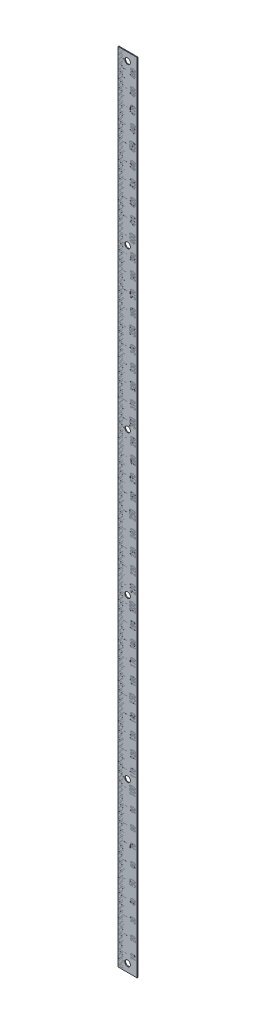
SolidWorks part; units mm, degrees
ref_plane "Front" through (0, 0, 0) normal (0, 0, 1) x (1, 0, 0)
ref_plane "Top" through (0, 0, 0) normal (0, 1, 0) x (1, 0, 0)
ref_plane "Right" through (0, 0, 0) normal (1, 0, 0) x (0, 0, -1)
sketch "Sketch1" plane through (0, 0, 0) normal (0, 0, 1) x (1, 0, 0)
  line L1 (0, 0) -> (0, 500)
  line L2 (0, 0) -> (12, 0)
  line L3 (12, 0) -> (12, 500)
  line L4 (0, 500) -> (12, 500)
  dimension "D1" = 500
  dimension "D2" = 12
extrude "Extrude1" add sketch "Sketch1" along normal blind 0.5
sketch "Sketch2" plane through (0, 0, 0.5) normal (0, 0, 1) x (1, 0, 0)
  line L0 (0, 500) -> (0, 0) construction
  line L1 (0, 0) -> (12, 0) construction
  line L2 (12, 500) -> (0, 500) construction
  circle A0 centre (6, 5) radius 1.75
  circle A1 centre (6, 495) radius 1.75
  circle A2 centre (6, 205) radius 1.75
  circle A3 centre (6, 295) radius 1.75
  circle A4 centre (6, 105) radius 1.75
  circle A5 centre (6, 395) radius 1.75
  dimension "D1" = 6
  dimension "D2" = 6
  dimension "D3" = 5
  dimension "D4" = 5
  dimension "D5" = 3.5
  dimension "D6" = 3.5
  dimension "D7" = 100
  dimension "D9" = 100
  dimension "D10" = 3.5
  dimension "D11" = 100
  dimension "D12" = 3.5
  dimension "D13" = 100
  dimension "D14" = 3.5
  dimension "D8" = 2
extrude "Extrude2" cut sketch "Sketch2" against normal through all
sketch "Sketch3" plane through (0, 0, 0.5) normal (0, 0, 1) x (1, 0, 0)
  line L4 (11, 137.4) -> (11, 140.9) construction
  line L5 (11, 20) -> (-4.9003, 20) construction
  line L6 (11, 127.4) -> (11, 130.9) construction
  line L7 (11, 117.4) -> (11, 120.9) construction
  line L8 (11, 107.4) -> (11, 110.9) construction
  line L9 (11, 97.2) -> (11, 102.8) construction
  line L10 (11, 88.25) -> (11, 91.75) construction
  line L11 (11, 78.25) -> (11, 81.75) construction
  line L12 (11, 68.25) -> (11, 71.75) construction
  line L13 (11, 58.25) -> (11, 61.75) construction
  line L14 (11, 48) -> (11, 52) construction
  line L15 (11, 38.25) -> (11, 43.5) construction
  line L16 (11, 30) -> (-4.9003, 30) construction
  line L17 (11, 40) -> (-4.9003, 40) construction
  line L18 (11, 28.25) -> (11, 33.5) construction
  line L19 (11, 18.25) -> (11, 23.5) construction
  line L20 (11, 8.25) -> (11, 13.5) construction
  line L21 (11, 50) -> (-4.9003, 50) construction
  line L22 (11, 60) -> (-4.9003, 60) construction
  line L23 (11, 70) -> (-4.9003, 70) construction
  line L24 (11, 80) -> (-4.9003, 80) construction
  line L27 (11, 187.4) -> (11, 190.9) construction
  line L28 (11, 177.4) -> (11, 180.9) construction
  line L29 (11, 167.4) -> (11, 170.9) construction
  line L30 (11, 157.4) -> (11, 160.9) construction
  line L31 (11, 147.2) -> (11, 152.8) construction
  line L32 (11, 90) -> (-4.9003, 90) construction
  line L33 (11, 100) -> (-4.9003, 100) construction
  line L34 (11, 110) -> (-4.9003, 110) construction
  line L35 (11, 120) -> (-4.9003, 120) construction
  line L36 (11, 130) -> (-4.9003, 130) construction
  line L37 (11, 140) -> (-4.9003, 140) construction
  line L38 (11, 150) -> (-4.9003, 150) construction
  line L39 (11, 160) -> (-4.9003, 160) construction
  line L40 (11, 10) -> (-4.9003, 10) construction
  line L41 (12, 0) -> (12, 500) construction
  line L42 (11, 237.4) -> (11, 240.9) construction
  line L43 (11, 227.4) -> (11, 230.9) construction
  line L44 (11, 217.4) -> (11, 220.9) construction
  line L45 (11, 207.4) -> (11, 210.9) construction
  line L46 (11, 170) -> (-4.9003, 170) construction
  line L47 (11, 180) -> (-4.9003, 180) construction
  line L48 (11, 190) -> (-4.9003, 190) construction
  line L49 (11, 200) -> (-4.9003, 200) construction
  line L50 (11, 210) -> (-4.9003, 210) construction
  line L51 (11, 220) -> (-4.9003, 220) construction
  line L52 (11, 230) -> (-4.9003, 230) construction
  line L53 (11, 240) -> (-4.9003, 240) construction
  line L54 (11, 250) -> (-4.9003, 250) construction
  line L55 (11, 260) -> (-4.9003, 260) construction
  line L56 (11, 270) -> (-4.9003, 270) construction
  line L57 (11, 280) -> (-4.9003, 280) construction
  line L58 (11, 290) -> (-4.9003, 290) construction
  line L59 (11, 300) -> (-4.9003, 300) construction
  line L60 (11, 310) -> (-4.9003, 310) construction
  line L61 (11, 320) -> (-4.9003, 320) construction
  line L62 (11, 330) -> (-4.9003, 330) construction
  line L63 (11, 340) -> (-4.9003, 340) construction
  line L64 (11, 350) -> (-4.9003, 350) construction
  line L65 (11, 360) -> (-4.9003, 360) construction
  line L66 (11, 370) -> (-4.9003, 370) construction
  line L67 (11, 380) -> (-4.9003, 380) construction
  line L68 (11, 390) -> (-4.9003, 390) construction
  line L69 (11, 400) -> (-4.9003, 400) construction
  line L70 (11, 410) -> (-4.9003, 410) construction
  line L71 (11, 420) -> (-4.9003, 420) construction
  line L72 (11, 430) -> (-4.9003, 430) construction
  line L73 (11, 440) -> (-4.9003, 440) construction
  line L74 (11, 450) -> (-4.9003, 450) construction
  line L75 (11, 460) -> (-4.9003, 460) construction
  line L76 (11, 470) -> (-4.9003, 470) construction
  line L77 (11, 480) -> (-4.9003, 480) construction
  line L78 (11, 490) -> (-4.9003, 490) construction
  line L79 (11, 10) -> (11, 20) construction
  line L80 (11, 197.2) -> (11, 202.8) construction
  line L81 (11, 287.4) -> (11, 290.9) construction
  line L82 (11, 277.4) -> (11, 280.9) construction
  line L83 (11, 267.4) -> (11, 270.9) construction
  line L84 (11, 257.4) -> (11, 260.9) construction
  line L85 (11, 247.2) -> (11, 252.8) construction
  line L86 (11, 337.4) -> (11, 340.9) construction
  line L87 (11, 327.4) -> (11, 330.9) construction
  line L88 (11, 317.4) -> (11, 320.9) construction
  line L89 (11, 307.4) -> (11, 310.9) construction
  line L90 (11, 297.2) -> (11, 302.8) construction
  line L91 (11, 387.4) -> (11, 390.9) construction
  line L92 (11, 377.4) -> (11, 380.9) construction
  line L93 (11, 367.4) -> (11, 370.9) construction
  line L94 (11, 357.4) -> (11, 360.9) construction
  line L95 (11, 347.2) -> (11, 352.8) construction
  line L96 (11, 437.4) -> (11, 440.9) construction
  line L97 (11, 427.4) -> (11, 430.9) construction
  line L98 (11, 417.4) -> (11, 420.9) construction
  line L99 (11, 407.4) -> (11, 410.9) construction
  line L100 (11, 397.2) -> (11, 402.8) construction
  line L101 (11, 487.4) -> (11, 490.9) construction
  line L102 (11, 477.4) -> (11, 480.9) construction
  line L103 (11, 467.4) -> (11, 470.9) construction
  line L104 (11, 457.4) -> (11, 460.9) construction
  line L105 (11, 447.2) -> (11, 452.8) construction
  text T0 "140" font "ＭＳ ゴシック" height in points 11
  text T1 "130" font "ＭＳ ゴシック" height in points 11
  text T2 "120" font "ＭＳ ゴシック" height in points 11
  text T3 "110" font "ＭＳ ゴシック" height in points 11
  text T4 "100" font "ＭＳ ゴシック" height in points 13
  text T5 "90" font "ＭＳ ゴシック" height in points 11
  text T6 "80" font "ＭＳ ゴシック" height in points 11
  text T7 "70" font "ＭＳ ゴシック" height in points 11
  text T8 "60" font "ＭＳ ゴシック" height in points 11
  text T9 "50" font "ＭＳ ゴシック" height in points 13
  text T10 "40" font "ＭＳ ゴシック" height in points 11
  text T11 "30" font "ＭＳ ゴシック" height in points 11
  text T12 "20" font "ＭＳ ゴシック" height in points 11
  text T13 "10" font "ＭＳ ゴシック" height in points 11
  text T14 "150" font "ＭＳ ゴシック" height in points 13
  text T15 "160" font "ＭＳ ゴシック" height in points 11
  text T16 "170" font "ＭＳ ゴシック" height in points 11
  text T17 "180" font "ＭＳ ゴシック" height in points 11
  text T18 "190" font "ＭＳ ゴシック" height in points 11
  text T19 "200" font "ＭＳ ゴシック" height in points 13
  text T20 "210" font "ＭＳ ゴシック" height in points 11
  text T21 "220" font "ＭＳ ゴシック" height in points 11
  text T22 "230" font "ＭＳ ゴシック" height in points 11
  text T24 "240" font "ＭＳ ゴシック" height in points 11
  text T25 "250" font "ＭＳ ゴシック" height in points 13
  text T26 "260" font "ＭＳ ゴシック" height in points 11
  text T28 "270" font "ＭＳ ゴシック" height in points 11
  text T29 "280" font "ＭＳ ゴシック" height in points 11
  text T30 "290" font "ＭＳ ゴシック" height in points 11
  text T31 "300" font "ＭＳ ゴシック" height in points 13
  text T32 "310" font "ＭＳ ゴシック" height in points 11
  text T33 "320" font "ＭＳ ゴシック" height in points 11
  text T34 "330" font "ＭＳ ゴシック" height in points 11
  text T36 "340" font "ＭＳ ゴシック" height in points 11
  text T37 "350" font "ＭＳ ゴシック" height in points 13
  text T38 "360" font "ＭＳ ゴシック" height in points 11
  text T39 "370" font "ＭＳ ゴシック" height in points 11
  text T40 "380" font "ＭＳ ゴシック" height in points 11
  text T41 "390" font "ＭＳ ゴシック" height in points 11
  text T42 "400" font "ＭＳ ゴシック" height in points 13
  text T43 "410" font "ＭＳ ゴシック" height in points 11
  text T44 "420" font "ＭＳ ゴシック" height in points 11
  text T45 "430" font "ＭＳ ゴシック" height in points 11
  text T46 "440" font "ＭＳ ゴシック" height in points 11
  text T47 "450" font "ＭＳ ゴシック" height in points 13
  text T48 "460" font "ＭＳ ゴシック" height in points 11
  text T49 "470" font "ＭＳ ゴシック" height in points 11
  text T50 "480" font "ＭＳ ゴシック" height in points 11
  text T51 "490" font "ＭＳ ゴシック" height in points 11
  dimension "D2" = 49
  dimension "D3" = 1
  dimension "D4" = 3.5
  dimension "D8" = 4
  dimension "D11" = 5.6
  dimension "D5" = 3.5
  dimension "D15" = 2
  dimension "D16" = 1.75
  dimension "D6" = 10
  dimension "D7" = 4
extrude "Extrude3" cut sketch "Sketch3" against normal blind 0.01
sketch "Sketch4" plane through (0, 0, 0.5) normal (0, 0, 1) x (1, 0, 0)
  line L0 (0, 199.95) -> (0, 200.05)
  line L1 (5.5, 199.95) -> (0, 199.95)
  line L2 (5.5, 200.05) -> (5.5, 199.95)
  line L3 (0, 200.05) -> (5.5, 200.05)
  line L4 (3, 201.05) -> (3, 200.95)
  line L5 (12, 500) -> (0, 500) construction
  line L6 (0, 200.95) -> (3, 200.95)
  line L7 (0, 201.05) -> (3, 201.05)
  line L8 (0, 201.05) -> (0, 200.95)
  line L9 (3, 202.05) -> (3, 201.95)
  line L10 (0, 201.95) -> (3, 201.95)
  line L11 (0, 202.05) -> (3, 202.05)
  line L12 (0, 202.05) -> (0, 201.95)
  line L13 (3, 203.05) -> (3, 202.95)
  line L14 (0, 202.95) -> (3, 202.95)
  line L15 (0, 203.05) -> (3, 203.05)
  line L16 (0, 203.05) -> (0, 202.95)
  line L17 (3, 204.05) -> (3, 203.95)
  line L18 (0, 203.95) -> (3, 203.95)
  line L19 (0, 204.05) -> (3, 204.05)
  line L20 (0, 204.05) -> (0, 203.95)
  line L21 (3, 206.05) -> (3, 205.95)
  line L22 (0, 205.95) -> (3, 205.95)
  line L23 (0, 206.05) -> (3, 206.05)
  line L24 (0, 206.05) -> (0, 205.95)
  line L25 (3, 207.05) -> (3, 206.95)
  line L26 (0, 206.95) -> (3, 206.95)
  line L27 (0, 207.05) -> (3, 207.05)
  line L28 (0, 207.05) -> (0, 206.95)
  line L29 (3, 208.05) -> (3, 207.95)
  line L30 (0, 207.95) -> (3, 207.95)
  line L31 (0, 208.05) -> (3, 208.05)
  line L32 (3, 209.05) -> (3, 208.95)
  line L33 (0, 208.95) -> (3, 208.95)
  line L34 (0, 209.05) -> (0, 208.95)
  line L35 (0, 209.05) -> (3, 209.05)
  line L36 (4, 204.95) -> (4, 205.05)
  line L37 (0, 205.05) -> (4, 205.05)
  line L38 (0, 204.95) -> (0, 205.05)
  line L39 (0, 204.95) -> (4, 204.95)
  line L40 (0, 208.05) -> (0, 207.95)
  line L41 (0, 209.95) -> (0, 210.05)
  line L42 (5.5, 209.95) -> (0, 209.95)
  line L43 (5.5, 210.05) -> (5.5, 209.95)
  line L44 (0, 210.05) -> (5.5, 210.05)
  line L45 (3, 211.05) -> (3, 210.95)
  line L46 (0, 210.95) -> (3, 210.95)
  line L47 (0, 211.05) -> (3, 211.05)
  line L48 (0, 211.05) -> (0, 210.95)
  line L49 (3, 212.05) -> (3, 211.95)
  line L50 (0, 211.95) -> (3, 211.95)
  line L51 (0, 212.05) -> (3, 212.05)
  line L52 (0, 212.05) -> (0, 211.95)
  line L53 (3, 213.05) -> (3, 212.95)
  line L54 (0, 212.95) -> (3, 212.95)
  line L55 (0, 213.05) -> (3, 213.05)
  line L56 (0, 213.05) -> (0, 212.95)
  line L57 (3, 214.05) -> (3, 213.95)
  line L58 (0, 213.95) -> (3, 213.95)
  line L59 (0, 214.05) -> (3, 214.05)
  line L60 (0, 214.05) -> (0, 213.95)
  line L61 (3, 216.05) -> (3, 215.95)
  line L62 (0, 215.95) -> (3, 215.95)
  line L63 (0, 216.05) -> (3, 216.05)
  line L64 (0, 216.05) -> (0, 215.95)
  line L65 (3, 217.05) -> (3, 216.95)
  line L66 (0, 216.95) -> (3, 216.95)
  line L67 (0, 217.05) -> (3, 217.05)
  line L68 (0, 217.05) -> (0, 216.95)
  line L69 (3, 218.05) -> (3, 217.95)
  line L70 (0, 217.95) -> (3, 217.95)
  line L71 (0, 218.05) -> (3, 218.05)
  line L72 (3, 219.05) -> (3, 218.95)
  line L73 (0, 218.95) -> (3, 218.95)
  line L74 (0, 219.05) -> (0, 218.95)
  line L75 (0, 219.05) -> (3, 219.05)
  line L76 (4, 214.95) -> (4, 215.05)
  line L77 (0, 215.05) -> (4, 215.05)
  line L78 (0, 214.95) -> (0, 215.05)
  line L79 (0, 214.95) -> (4, 214.95)
  line L80 (0, 218.05) -> (0, 217.95)
  line L81 (0, 219.95) -> (0, 220.05)
  line L82 (5.5, 219.95) -> (0, 219.95)
  line L83 (5.5, 220.05) -> (5.5, 219.95)
  line L84 (0, 220.05) -> (5.5, 220.05)
  line L85 (3, 221.05) -> (3, 220.95)
  line L86 (0, 220.95) -> (3, 220.95)
  line L87 (0, 221.05) -> (3, 221.05)
  line L88 (0, 221.05) -> (0, 220.95)
  line L89 (3, 222.05) -> (3, 221.95)
  line L90 (0, 221.95) -> (3, 221.95)
  line L91 (0, 222.05) -> (3, 222.05)
  line L92 (0, 222.05) -> (0, 221.95)
  line L93 (3, 223.05) -> (3, 222.95)
  line L94 (0, 222.95) -> (3, 222.95)
  line L95 (0, 223.05) -> (3, 223.05)
  line L96 (0, 223.05) -> (0, 222.95)
  line L97 (3, 224.05) -> (3, 223.95)
  line L98 (0, 223.95) -> (3, 223.95)
  line L99 (0, 224.05) -> (3, 224.05)
  line L100 (0, 224.05) -> (0, 223.95)
  line L101 (3, 226.05) -> (3, 225.95)
  line L102 (0, 225.95) -> (3, 225.95)
  line L103 (0, 226.05) -> (3, 226.05)
  line L104 (0, 226.05) -> (0, 225.95)
  line L105 (3, 227.05) -> (3, 226.95)
  line L106 (0, 226.95) -> (3, 226.95)
  line L107 (0, 227.05) -> (3, 227.05)
  line L108 (0, 227.05) -> (0, 226.95)
  line L109 (3, 228.05) -> (3, 227.95)
  line L110 (0, 227.95) -> (3, 227.95)
  line L111 (0, 228.05) -> (3, 228.05)
  line L112 (3, 229.05) -> (3, 228.95)
  line L113 (0, 228.95) -> (3, 228.95)
  line L114 (0, 229.05) -> (0, 228.95)
  line L115 (0, 229.05) -> (3, 229.05)
  line L116 (4, 224.95) -> (4, 225.05)
  line L117 (0, 225.05) -> (4, 225.05)
  line L118 (0, 224.95) -> (0, 225.05)
  line L119 (0, 224.95) -> (4, 224.95)
  line L120 (0, 228.05) -> (0, 227.95)
  line L121 (0, 229.95) -> (0, 230.05)
  line L122 (5.5, 229.95) -> (0, 229.95)
  line L123 (5.5, 230.05) -> (5.5, 229.95)
  line L124 (0, 230.05) -> (5.5, 230.05)
  line L125 (3, 231.05) -> (3, 230.95)
  line L126 (0, 230.95) -> (3, 230.95)
  line L127 (0, 231.05) -> (3, 231.05)
  line L128 (0, 231.05) -> (0, 230.95)
  line L129 (3, 232.05) -> (3, 231.95)
  line L130 (0, 231.95) -> (3, 231.95)
  line L131 (0, 232.05) -> (3, 232.05)
  line L132 (0, 232.05) -> (0, 231.95)
  line L133 (3, 233.05) -> (3, 232.95)
  line L134 (0, 232.95) -> (3, 232.95)
  line L135 (0, 233.05) -> (3, 233.05)
  line L136 (0, 233.05) -> (0, 232.95)
  line L137 (3, 234.05) -> (3, 233.95)
  line L138 (0, 233.95) -> (3, 233.95)
  line L139 (0, 234.05) -> (3, 234.05)
  line L140 (0, 234.05) -> (0, 233.95)
  line L141 (3, 236.05) -> (3, 235.95)
  line L142 (0, 235.95) -> (3, 235.95)
  line L143 (0, 236.05) -> (3, 236.05)
  line L144 (0, 236.05) -> (0, 235.95)
  line L145 (3, 237.05) -> (3, 236.95)
  line L146 (0, 236.95) -> (3, 236.95)
  line L147 (0, 237.05) -> (3, 237.05)
  line L148 (0, 237.05) -> (0, 236.95)
  line L149 (3, 238.05) -> (3, 237.95)
  line L150 (0, 237.95) -> (3, 237.95)
  line L151 (0, 238.05) -> (3, 238.05)
  line L152 (3, 239.05) -> (3, 238.95)
  line L153 (0, 238.95) -> (3, 238.95)
  line L154 (0, 239.05) -> (0, 238.95)
  line L155 (0, 239.05) -> (3, 239.05)
  line L156 (4, 234.95) -> (4, 235.05)
  line L157 (0, 235.05) -> (4, 235.05)
  line L158 (0, 234.95) -> (0, 235.05)
  line L159 (0, 234.95) -> (4, 234.95)
  line L160 (0, 238.05) -> (0, 237.95)
  line L161 (0, 239.95) -> (0, 240.05)
  line L162 (5.5, 239.95) -> (0, 239.95)
  line L163 (5.5, 240.05) -> (5.5, 239.95)
  line L164 (0, 240.05) -> (5.5, 240.05)
  line L165 (3, 241.05) -> (3, 240.95)
  line L166 (0, 240.95) -> (3, 240.95)
  line L167 (0, 241.05) -> (3, 241.05)
  line L168 (0, 241.05) -> (0, 240.95)
  line L169 (3, 242.05) -> (3, 241.95)
  line L170 (0, 241.95) -> (3, 241.95)
  line L171 (0, 242.05) -> (3, 242.05)
  line L172 (0, 242.05) -> (0, 241.95)
  line L173 (3, 243.05) -> (3, 242.95)
  line L174 (0, 242.95) -> (3, 242.95)
  line L175 (0, 243.05) -> (3, 243.05)
  line L176 (0, 243.05) -> (0, 242.95)
  line L177 (3, 244.05) -> (3, 243.95)
  line L178 (0, 243.95) -> (3, 243.95)
  line L179 (0, 244.05) -> (3, 244.05)
  line L180 (0, 244.05) -> (0, 243.95)
  line L181 (3, 246.05) -> (3, 245.95)
  line L182 (0, 245.95) -> (3, 245.95)
  line L183 (0, 246.05) -> (3, 246.05)
  line L184 (0, 246.05) -> (0, 245.95)
  line L185 (3, 247.05) -> (3, 246.95)
  line L186 (0, 246.95) -> (3, 246.95)
  line L187 (0, 247.05) -> (3, 247.05)
  line L188 (0, 247.05) -> (0, 246.95)
  line L189 (3, 248.05) -> (3, 247.95)
  line L190 (0, 247.95) -> (3, 247.95)
  line L191 (0, 248.05) -> (3, 248.05)
  line L192 (3, 249.05) -> (3, 248.95)
  line L193 (0, 248.95) -> (3, 248.95)
  line L194 (0, 249.05) -> (0, 248.95)
  line L195 (0, 249.05) -> (3, 249.05)
  line L196 (4, 244.95) -> (4, 245.05)
  line L197 (0, 245.05) -> (4, 245.05)
  line L198 (0, 244.95) -> (0, 245.05)
  line L199 (0, 244.95) -> (4, 244.95)
  line L200 (0, 248.05) -> (0, 247.95)
  line L201 (3, 251.05) -> (3, 250.95)
  line L202 (0, 250.95) -> (3, 250.95)
  line L203 (0, 251.05) -> (3, 251.05)
  line L204 (0, 251.05) -> (0, 250.95)
  line L205 (3, 252.05) -> (3, 251.95)
  line L206 (0, 251.95) -> (3, 251.95)
  line L207 (0, 252.05) -> (3, 252.05)
  line L208 (0, 252.05) -> (0, 251.95)
  line L209 (3, 253.05) -> (3, 252.95)
  line L210 (0, 252.95) -> (3, 252.95)
  line L211 (0, 253.05) -> (3, 253.05)
  line L212 (0, 253.05) -> (0, 252.95)
  line L213 (3, 254.05) -> (3, 253.95)
  line L214 (0, 253.95) -> (3, 253.95)
  line L215 (0, 254.05) -> (3, 254.05)
  line L216 (0, 254.05) -> (0, 253.95)
  line L217 (3, 256.05) -> (3, 255.95)
  line L218 (0, 255.95) -> (3, 255.95)
  line L219 (0, 256.05) -> (3, 256.05)
  line L220 (0, 256.05) -> (0, 255.95)
  line L221 (3, 257.05) -> (3, 256.95)
  line L222 (0, 256.95) -> (3, 256.95)
  line L223 (0, 257.05) -> (3, 257.05)
  line L224 (0, 257.05) -> (0, 256.95)
  line L225 (3, 258.05) -> (3, 257.95)
  line L226 (0, 257.95) -> (3, 257.95)
  line L227 (0, 258.05) -> (3, 258.05)
  line L228 (3, 259.05) -> (3, 258.95)
  line L229 (0, 258.95) -> (3, 258.95)
  line L230 (0, 259.05) -> (0, 258.95)
  line L231 (0, 259.05) -> (3, 259.05)
  line L232 (4, 254.95) -> (4, 255.05)
  line L233 (0, 255.05) -> (4, 255.05)
  line L234 (0, 254.95) -> (0, 255.05)
  line L235 (0, 254.95) -> (4, 254.95)
  line L236 (0, 258.05) -> (0, 257.95)
  line L237 (0, 249.95) -> (0, 250.05)
  line L238 (5.5, 249.95) -> (0, 249.95)
  line L239 (5.5, 250.05) -> (5.5, 249.95)
  line L240 (0, 250.05) -> (5.5, 250.05)
  line L241 (3, 261.05) -> (3, 260.95)
  line L242 (0, 260.95) -> (3, 260.95)
  line L243 (0, 261.05) -> (3, 261.05)
  line L244 (0, 261.05) -> (0, 260.95)
  line L245 (3, 262.05) -> (3, 261.95)
  line L246 (0, 261.95) -> (3, 261.95)
  line L247 (0, 262.05) -> (3, 262.05)
  line L248 (0, 262.05) -> (0, 261.95)
  line L249 (3, 263.05) -> (3, 262.95)
  line L250 (0, 262.95) -> (3, 262.95)
  line L251 (0, 263.05) -> (3, 263.05)
  line L252 (0, 263.05) -> (0, 262.95)
  line L253 (3, 264.05) -> (3, 263.95)
  line L254 (0, 263.95) -> (3, 263.95)
  line L255 (0, 264.05) -> (3, 264.05)
  line L256 (0, 264.05) -> (0, 263.95)
  line L257 (3, 266.05) -> (3, 265.95)
  line L258 (0, 265.95) -> (3, 265.95)
  line L259 (0, 266.05) -> (3, 266.05)
  line L260 (0, 266.05) -> (0, 265.95)
  line L261 (3, 267.05) -> (3, 266.95)
  line L262 (0, 266.95) -> (3, 266.95)
  line L263 (0, 267.05) -> (3, 267.05)
  line L264 (0, 267.05) -> (0, 266.95)
  line L265 (3, 268.05) -> (3, 267.95)
  line L266 (0, 267.95) -> (3, 267.95)
  line L267 (0, 268.05) -> (3, 268.05)
  line L268 (3, 269.05) -> (3, 268.95)
  line L269 (0, 268.95) -> (3, 268.95)
  line L270 (0, 269.05) -> (0, 268.95)
  line L271 (0, 269.05) -> (3, 269.05)
  line L272 (4, 264.95) -> (4, 265.05)
  line L273 (0, 265.05) -> (4, 265.05)
  line L274 (0, 264.95) -> (0, 265.05)
  line L275 (0, 264.95) -> (4, 264.95)
  line L276 (0, 268.05) -> (0, 267.95)
  line L277 (0, 259.95) -> (0, 260.05)
  line L278 (5.5, 259.95) -> (0, 259.95)
  line L279 (5.5, 260.05) -> (5.5, 259.95)
  line L280 (0, 260.05) -> (5.5, 260.05)
  line L281 (3, 271.05) -> (3, 270.95)
  line L282 (0, 270.95) -> (3, 270.95)
  line L283 (0, 271.05) -> (3, 271.05)
  line L284 (0, 271.05) -> (0, 270.95)
  line L285 (3, 272.05) -> (3, 271.95)
  line L286 (0, 271.95) -> (3, 271.95)
  line L287 (0, 272.05) -> (3, 272.05)
  line L288 (0, 272.05) -> (0, 271.95)
  line L289 (3, 273.05) -> (3, 272.95)
  line L290 (0, 272.95) -> (3, 272.95)
  line L291 (0, 273.05) -> (3, 273.05)
  line L292 (0, 273.05) -> (0, 272.95)
  line L293 (3, 274.05) -> (3, 273.95)
  line L294 (0, 273.95) -> (3, 273.95)
  line L295 (0, 274.05) -> (3, 274.05)
  line L296 (0, 274.05) -> (0, 273.95)
  line L297 (3, 276.05) -> (3, 275.95)
  line L298 (0, 275.95) -> (3, 275.95)
  line L299 (0, 276.05) -> (3, 276.05)
  line L300 (0, 276.05) -> (0, 275.95)
  line L301 (3, 277.05) -> (3, 276.95)
  line L302 (0, 276.95) -> (3, 276.95)
  line L303 (0, 277.05) -> (3, 277.05)
  line L304 (0, 277.05) -> (0, 276.95)
  line L305 (3, 278.05) -> (3, 277.95)
  line L306 (0, 277.95) -> (3, 277.95)
  line L307 (0, 278.05) -> (3, 278.05)
  line L308 (3, 279.05) -> (3, 278.95)
  line L309 (0, 278.95) -> (3, 278.95)
  line L310 (0, 279.05) -> (0, 278.95)
  line L311 (0, 279.05) -> (3, 279.05)
  line L312 (4, 274.95) -> (4, 275.05)
  line L313 (0, 275.05) -> (4, 275.05)
  line L314 (0, 274.95) -> (0, 275.05)
  line L315 (0, 274.95) -> (4, 274.95)
  line L316 (0, 278.05) -> (0, 277.95)
  line L317 (0, 269.95) -> (0, 270.05)
  line L318 (5.5, 269.95) -> (0, 269.95)
  line L319 (5.5, 270.05) -> (5.5, 269.95)
  line L320 (0, 270.05) -> (5.5, 270.05)
  line L321 (3, 281.05) -> (3, 280.95)
  line L322 (0, 280.95) -> (3, 280.95)
  line L323 (0, 281.05) -> (3, 281.05)
  line L324 (0, 281.05) -> (0, 280.95)
  line L325 (3, 282.05) -> (3, 281.95)
  line L326 (0, 281.95) -> (3, 281.95)
  line L327 (0, 282.05) -> (3, 282.05)
  line L328 (0, 282.05) -> (0, 281.95)
  line L329 (3, 283.05) -> (3, 282.95)
  line L330 (0, 282.95) -> (3, 282.95)
  line L331 (0, 283.05) -> (3, 283.05)
  line L332 (0, 283.05) -> (0, 282.95)
  line L333 (3, 284.05) -> (3, 283.95)
  line L334 (0, 283.95) -> (3, 283.95)
  line L335 (0, 284.05) -> (3, 284.05)
  line L336 (0, 284.05) -> (0, 283.95)
  line L337 (3, 286.05) -> (3, 285.95)
  line L338 (0, 285.95) -> (3, 285.95)
  line L339 (0, 286.05) -> (3, 286.05)
  line L340 (0, 286.05) -> (0, 285.95)
  line L341 (3, 287.05) -> (3, 286.95)
  line L342 (0, 286.95) -> (3, 286.95)
  line L343 (0, 287.05) -> (3, 287.05)
  line L344 (0, 287.05) -> (0, 286.95)
  line L345 (3, 288.05) -> (3, 287.95)
  line L346 (0, 287.95) -> (3, 287.95)
  line L347 (0, 288.05) -> (3, 288.05)
  line L348 (3, 289.05) -> (3, 288.95)
  line L349 (0, 288.95) -> (3, 288.95)
  line L350 (0, 289.05) -> (0, 288.95)
  line L351 (0, 289.05) -> (3, 289.05)
  line L352 (4, 284.95) -> (4, 285.05)
  line L353 (0, 285.05) -> (4, 285.05)
  line L354 (0, 284.95) -> (0, 285.05)
  line L355 (0, 284.95) -> (4, 284.95)
  line L356 (0, 288.05) -> (0, 287.95)
  line L357 (3, 291.05) -> (3, 290.95)
  line L358 (0, 290.95) -> (3, 290.95)
  line L359 (0, 291.05) -> (3, 291.05)
  line L360 (0, 291.05) -> (0, 290.95)
  line L361 (3, 292.05) -> (3, 291.95)
  line L362 (0, 291.95) -> (3, 291.95)
  line L363 (0, 292.05) -> (3, 292.05)
  line L364 (0, 292.05) -> (0, 291.95)
  line L365 (3, 293.05) -> (3, 292.95)
  line L366 (0, 292.95) -> (3, 292.95)
  line L367 (0, 293.05) -> (3, 293.05)
  line L368 (0, 293.05) -> (0, 292.95)
  line L369 (3, 294.05) -> (3, 293.95)
  line L370 (0, 293.95) -> (3, 293.95)
  line L371 (0, 294.05) -> (3, 294.05)
  line L372 (0, 294.05) -> (0, 293.95)
  line L373 (0, 279.95) -> (0, 280.05)
  line L374 (5.5, 279.95) -> (0, 279.95)
  line L375 (5.5, 280.05) -> (5.5, 279.95)
  line L376 (0, 280.05) -> (5.5, 280.05)
  line L377 (3, 296.05) -> (3, 295.95)
  line L378 (0, 295.95) -> (3, 295.95)
  line L379 (0, 296.05) -> (3, 296.05)
  line L380 (0, 296.05) -> (0, 295.95)
  line L381 (3, 297.05) -> (3, 296.95)
  line L382 (0, 296.95) -> (3, 296.95)
  line L383 (0, 297.05) -> (3, 297.05)
  line L384 (0, 297.05) -> (0, 296.95)
  line L385 (3, 298.05) -> (3, 297.95)
  line L386 (0, 297.95) -> (3, 297.95)
  line L387 (0, 298.05) -> (3, 298.05)
  line L388 (3, 299.05) -> (3, 298.95)
  line L389 (0, 298.95) -> (3, 298.95)
  line L390 (0, 299.05) -> (0, 298.95)
  line L391 (0, 299.05) -> (3, 299.05)
  line L392 (4, 294.95) -> (4, 295.05)
  line L393 (0, 295.05) -> (4, 295.05)
  line L394 (0, 294.95) -> (0, 295.05)
  line L395 (0, 294.95) -> (4, 294.95)
  line L396 (0, 298.05) -> (0, 297.95)
  line L397 (0, 289.95) -> (0, 290.05)
  line L398 (5.5, 289.95) -> (0, 289.95)
  line L399 (5.5, 290.05) -> (5.5, 289.95)
  line L400 (0, 290.05) -> (5.5, 290.05)
  line L401 (0, 299.95) -> (0, 300.05)
  line L402 (5.5, 299.95) -> (0, 299.95)
  line L403 (5.5, 300.05) -> (5.5, 299.95)
  line L404 (0, 300.05) -> (5.5, 300.05)
  line L405 (3, 301.05) -> (3, 300.95)
  line L406 (0, 300.95) -> (3, 300.95)
  line L407 (0, 301.05) -> (3, 301.05)
  line L408 (0, 301.05) -> (0, 300.95)
  line L409 (3, 302.05) -> (3, 301.95)
  line L410 (0, 301.95) -> (3, 301.95)
  line L411 (0, 302.05) -> (3, 302.05)
  line L412 (0, 302.05) -> (0, 301.95)
  line L413 (3, 303.05) -> (3, 302.95)
  line L414 (0, 302.95) -> (3, 302.95)
  line L415 (0, 303.05) -> (3, 303.05)
  line L416 (0, 303.05) -> (0, 302.95)
  line L417 (3, 304.05) -> (3, 303.95)
  line L418 (0, 303.95) -> (3, 303.95)
  line L419 (0, 304.05) -> (3, 304.05)
  line L420 (0, 304.05) -> (0, 303.95)
  line L421 (3, 306.05) -> (3, 305.95)
  line L422 (0, 305.95) -> (3, 305.95)
  line L423 (0, 306.05) -> (3, 306.05)
  line L424 (0, 306.05) -> (0, 305.95)
  line L425 (3, 307.05) -> (3, 306.95)
  line L426 (0, 306.95) -> (3, 306.95)
  line L427 (0, 307.05) -> (3, 307.05)
  line L428 (0, 307.05) -> (0, 306.95)
  line L429 (3, 308.05) -> (3, 307.95)
  line L430 (0, 307.95) -> (3, 307.95)
  line L431 (0, 308.05) -> (3, 308.05)
  line L432 (3, 309.05) -> (3, 308.95)
  line L433 (0, 308.95) -> (3, 308.95)
  line L434 (0, 309.05) -> (0, 308.95)
  line L435 (0, 309.05) -> (3, 309.05)
  line L436 (4, 304.95) -> (4, 305.05)
  line L437 (0, 305.05) -> (4, 305.05)
  line L438 (0, 304.95) -> (0, 305.05)
  line L439 (0, 304.95) -> (4, 304.95)
  line L440 (0, 308.05) -> (0, 307.95)
  line L441 (0, 309.95) -> (0, 310.05)
  line L442 (5.5, 309.95) -> (0, 309.95)
  line L443 (5.5, 310.05) -> (5.5, 309.95)
  line L444 (0, 310.05) -> (5.5, 310.05)
  line L445 (3, 311.05) -> (3, 310.95)
  line L446 (0, 310.95) -> (3, 310.95)
  line L447 (0, 311.05) -> (3, 311.05)
  line L448 (0, 311.05) -> (0, 310.95)
  line L449 (3, 312.05) -> (3, 311.95)
  line L450 (0, 311.95) -> (3, 311.95)
  line L451 (0, 312.05) -> (3, 312.05)
  line L452 (0, 312.05) -> (0, 311.95)
  line L453 (3, 313.05) -> (3, 312.95)
  line L454 (0, 312.95) -> (3, 312.95)
  line L455 (0, 313.05) -> (3, 313.05)
  line L456 (0, 313.05) -> (0, 312.95)
  line L457 (3, 314.05) -> (3, 313.95)
  line L458 (0, 313.95) -> (3, 313.95)
  line L459 (0, 314.05) -> (3, 314.05)
  line L460 (0, 314.05) -> (0, 313.95)
  line L461 (3, 316.05) -> (3, 315.95)
  line L462 (0, 315.95) -> (3, 315.95)
  line L463 (0, 316.05) -> (3, 316.05)
  line L464 (0, 316.05) -> (0, 315.95)
  line L465 (3, 317.05) -> (3, 316.95)
  line L466 (0, 316.95) -> (3, 316.95)
  line L467 (0, 317.05) -> (3, 317.05)
  line L468 (0, 317.05) -> (0, 316.95)
  line L469 (3, 318.05) -> (3, 317.95)
  line L470 (0, 317.95) -> (3, 317.95)
  line L471 (0, 318.05) -> (3, 318.05)
  line L472 (3, 319.05) -> (3, 318.95)
  line L473 (0, 318.95) -> (3, 318.95)
  line L474 (0, 319.05) -> (0, 318.95)
  line L475 (0, 319.05) -> (3, 319.05)
  line L476 (4, 314.95) -> (4, 315.05)
  line L477 (0, 315.05) -> (4, 315.05)
  line L478 (0, 314.95) -> (0, 315.05)
  line L479 (0, 314.95) -> (4, 314.95)
  line L480 (0, 318.05) -> (0, 317.95)
  line L481 (0, 319.95) -> (0, 320.05)
  line L482 (5.5, 319.95) -> (0, 319.95)
  line L483 (5.5, 320.05) -> (5.5, 319.95)
  line L484 (0, 320.05) -> (5.5, 320.05)
  line L485 (3, 321.05) -> (3, 320.95)
  line L486 (0, 320.95) -> (3, 320.95)
  line L487 (0, 321.05) -> (3, 321.05)
  line L488 (0, 321.05) -> (0, 320.95)
  line L489 (3, 322.05) -> (3, 321.95)
  line L490 (0, 321.95) -> (3, 321.95)
  line L491 (0, 322.05) -> (3, 322.05)
  line L492 (0, 322.05) -> (0, 321.95)
  line L493 (3, 323.05) -> (3, 322.95)
  line L494 (0, 322.95) -> (3, 322.95)
  line L495 (0, 323.05) -> (3, 323.05)
  line L496 (0, 323.05) -> (0, 322.95)
  line L497 (3, 324.05) -> (3, 323.95)
  line L498 (0, 323.95) -> (3, 323.95)
  line L499 (0, 324.05) -> (3, 324.05)
  line L500 (0, 324.05) -> (0, 323.95)
  line L501 (3, 326.05) -> (3, 325.95)
  line L502 (0, 325.95) -> (3, 325.95)
  line L503 (0, 326.05) -> (3, 326.05)
  line L504 (0, 326.05) -> (0, 325.95)
  line L505 (3, 327.05) -> (3, 326.95)
  line L506 (0, 326.95) -> (3, 326.95)
  line L507 (0, 327.05) -> (3, 327.05)
  line L508 (0, 327.05) -> (0, 326.95)
  line L509 (3, 328.05) -> (3, 327.95)
  line L510 (0, 327.95) -> (3, 327.95)
  line L511 (0, 328.05) -> (3, 328.05)
  line L512 (3, 329.05) -> (3, 328.95)
  line L513 (0, 328.95) -> (3, 328.95)
  line L514 (0, 329.05) -> (0, 328.95)
  line L515 (0, 329.05) -> (3, 329.05)
  line L516 (4, 324.95) -> (4, 325.05)
  line L517 (0, 325.05) -> (4, 325.05)
  line L518 (0, 324.95) -> (0, 325.05)
  line L519 (0, 324.95) -> (4, 324.95)
  line L520 (0, 328.05) -> (0, 327.95)
  line L521 (0, 329.95) -> (0, 330.05)
  line L522 (5.5, 329.95) -> (0, 329.95)
  line L523 (5.5, 330.05) -> (5.5, 329.95)
  line L524 (0, 330.05) -> (5.5, 330.05)
  line L525 (3, 331.05) -> (3, 330.95)
  line L526 (0, 330.95) -> (3, 330.95)
  line L527 (0, 331.05) -> (3, 331.05)
  line L528 (0, 331.05) -> (0, 330.95)
  line L529 (3, 332.05) -> (3, 331.95)
  line L530 (0, 331.95) -> (3, 331.95)
  line L531 (0, 332.05) -> (3, 332.05)
  line L532 (0, 332.05) -> (0, 331.95)
  line L533 (3, 333.05) -> (3, 332.95)
  line L534 (0, 332.95) -> (3, 332.95)
  line L535 (0, 333.05) -> (3, 333.05)
  line L536 (0, 333.05) -> (0, 332.95)
  line L537 (3, 334.05) -> (3, 333.95)
  line L538 (0, 333.95) -> (3, 333.95)
  line L539 (0, 334.05) -> (3, 334.05)
  line L540 (0, 334.05) -> (0, 333.95)
  line L541 (3, 336.05) -> (3, 335.95)
  line L542 (0, 335.95) -> (3, 335.95)
  line L543 (0, 336.05) -> (3, 336.05)
  line L544 (0, 336.05) -> (0, 335.95)
  line L545 (3, 337.05) -> (3, 336.95)
  line L546 (0, 336.95) -> (3, 336.95)
  line L547 (0, 337.05) -> (3, 337.05)
  line L548 (0, 337.05) -> (0, 336.95)
  line L549 (3, 338.05) -> (3, 337.95)
  line L550 (0, 337.95) -> (3, 337.95)
  line L551 (0, 338.05) -> (3, 338.05)
  line L552 (3, 339.05) -> (3, 338.95)
  line L553 (0, 338.95) -> (3, 338.95)
  line L554 (0, 339.05) -> (0, 338.95)
  line L555 (0, 339.05) -> (3, 339.05)
  line L556 (4, 334.95) -> (4, 335.05)
  line L557 (0, 335.05) -> (4, 335.05)
  line L558 (0, 334.95) -> (0, 335.05)
  line L559 (0, 334.95) -> (4, 334.95)
  line L560 (0, 338.05) -> (0, 337.95)
  line L561 (0, 339.95) -> (0, 340.05)
  line L562 (5.5, 339.95) -> (0, 339.95)
  line L563 (5.5, 340.05) -> (5.5, 339.95)
  line L564 (0, 340.05) -> (5.5, 340.05)
  line L565 (3, 341.05) -> (3, 340.95)
  line L566 (0, 340.95) -> (3, 340.95)
  line L567 (0, 341.05) -> (3, 341.05)
  line L568 (0, 341.05) -> (0, 340.95)
  line L569 (3, 342.05) -> (3, 341.95)
  line L570 (0, 341.95) -> (3, 341.95)
  line L571 (0, 342.05) -> (3, 342.05)
  line L572 (0, 342.05) -> (0, 341.95)
  line L573 (3, 343.05) -> (3, 342.95)
  line L574 (0, 342.95) -> (3, 342.95)
  line L575 (0, 343.05) -> (3, 343.05)
  line L576 (0, 343.05) -> (0, 342.95)
  line L577 (3, 344.05) -> (3, 343.95)
  line L578 (0, 343.95) -> (3, 343.95)
  line L579 (0, 344.05) -> (3, 344.05)
  line L580 (0, 344.05) -> (0, 343.95)
  line L581 (3, 346.05) -> (3, 345.95)
  line L582 (0, 345.95) -> (3, 345.95)
  line L583 (0, 346.05) -> (3, 346.05)
  line L584 (0, 346.05) -> (0, 345.95)
  line L585 (3, 347.05) -> (3, 346.95)
  line L586 (0, 346.95) -> (3, 346.95)
  line L587 (0, 347.05) -> (3, 347.05)
  line L588 (0, 347.05) -> (0, 346.95)
  line L589 (3, 348.05) -> (3, 347.95)
  line L590 (0, 347.95) -> (3, 347.95)
  line L591 (0, 348.05) -> (3, 348.05)
  line L592 (3, 349.05) -> (3, 348.95)
  line L593 (0, 348.95) -> (3, 348.95)
  line L594 (0, 349.05) -> (0, 348.95)
  line L595 (0, 349.05) -> (3, 349.05)
  line L596 (4, 344.95) -> (4, 345.05)
  line L597 (0, 345.05) -> (4, 345.05)
  line L598 (0, 344.95) -> (0, 345.05)
  line L599 (0, 344.95) -> (4, 344.95)
  line L600 (0, 348.05) -> (0, 347.95)
  line L601 (3, 351.05) -> (3, 350.95)
  line L602 (0, 350.95) -> (3, 350.95)
  line L603 (0, 351.05) -> (3, 351.05)
  line L604 (0, 351.05) -> (0, 350.95)
  line L605 (3, 352.05) -> (3, 351.95)
  line L606 (0, 351.95) -> (3, 351.95)
  line L607 (0, 352.05) -> (3, 352.05)
  line L608 (0, 352.05) -> (0, 351.95)
  line L609 (3, 353.05) -> (3, 352.95)
  line L610 (0, 352.95) -> (3, 352.95)
  line L611 (0, 353.05) -> (3, 353.05)
  line L612 (0, 353.05) -> (0, 352.95)
  line L613 (3, 354.05) -> (3, 353.95)
  line L614 (0, 353.95) -> (3, 353.95)
  line L615 (0, 354.05) -> (3, 354.05)
  line L616 (0, 354.05) -> (0, 353.95)
  line L617 (3, 356.05) -> (3, 355.95)
  line L618 (0, 355.95) -> (3, 355.95)
  line L619 (0, 356.05) -> (3, 356.05)
  line L620 (0, 356.05) -> (0, 355.95)
  line L621 (3, 357.05) -> (3, 356.95)
  line L622 (0, 356.95) -> (3, 356.95)
  line L623 (0, 357.05) -> (3, 357.05)
  line L624 (0, 357.05) -> (0, 356.95)
  line L625 (3, 358.05) -> (3, 357.95)
  line L626 (0, 357.95) -> (3, 357.95)
  line L627 (0, 358.05) -> (3, 358.05)
  line L628 (3, 359.05) -> (3, 358.95)
  line L629 (0, 358.95) -> (3, 358.95)
  line L630 (0, 359.05) -> (0, 358.95)
  line L631 (0, 359.05) -> (3, 359.05)
  line L632 (4, 354.95) -> (4, 355.05)
  line L633 (0, 355.05) -> (4, 355.05)
  line L634 (0, 354.95) -> (0, 355.05)
  line L635 (0, 354.95) -> (4, 354.95)
  line L636 (0, 358.05) -> (0, 357.95)
  line L637 (0, 349.95) -> (0, 350.05)
  line L638 (5.5, 349.95) -> (0, 349.95)
  line L639 (5.5, 350.05) -> (5.5, 349.95)
  line L640 (0, 350.05) -> (5.5, 350.05)
  line L641 (3, 361.05) -> (3, 360.95)
  line L642 (0, 360.95) -> (3, 360.95)
  line L643 (0, 361.05) -> (3, 361.05)
  line L644 (0, 361.05) -> (0, 360.95)
  line L645 (3, 362.05) -> (3, 361.95)
  line L646 (0, 361.95) -> (3, 361.95)
  line L647 (0, 362.05) -> (3, 362.05)
  line L648 (0, 362.05) -> (0, 361.95)
  line L649 (3, 363.05) -> (3, 362.95)
  line L650 (0, 362.95) -> (3, 362.95)
  line L651 (0, 363.05) -> (3, 363.05)
  line L652 (0, 363.05) -> (0, 362.95)
  line L653 (3, 364.05) -> (3, 363.95)
  line L654 (0, 363.95) -> (3, 363.95)
  line L655 (0, 364.05) -> (3, 364.05)
  line L656 (0, 364.05) -> (0, 363.95)
  line L657 (3, 366.05) -> (3, 365.95)
  line L658 (0, 365.95) -> (3, 365.95)
  line L659 (0, 366.05) -> (3, 366.05)
  line L660 (0, 366.05) -> (0, 365.95)
  line L661 (3, 367.05) -> (3, 366.95)
  line L662 (0, 366.95) -> (3, 366.95)
  line L663 (0, 367.05) -> (3, 367.05)
  line L664 (0, 367.05) -> (0, 366.95)
  line L665 (3, 368.05) -> (3, 367.95)
  line L666 (0, 367.95) -> (3, 367.95)
  line L667 (0, 368.05) -> (3, 368.05)
  line L668 (3, 369.05) -> (3, 368.95)
  line L669 (0, 368.95) -> (3, 368.95)
  line L670 (0, 369.05) -> (0, 368.95)
  line L671 (0, 369.05) -> (3, 369.05)
  line L672 (4, 364.95) -> (4, 365.05)
  line L673 (0, 365.05) -> (4, 365.05)
  line L674 (0, 364.95) -> (0, 365.05)
  line L675 (0, 364.95) -> (4, 364.95)
  line L676 (0, 368.05) -> (0, 367.95)
  line L677 (0, 359.95) -> (0, 360.05)
  line L678 (5.5, 359.95) -> (0, 359.95)
  line L679 (5.5, 360.05) -> (5.5, 359.95)
  line L680 (0, 360.05) -> (5.5, 360.05)
  line L681 (3, 371.05) -> (3, 370.95)
  line L682 (0, 370.95) -> (3, 370.95)
  line L683 (0, 371.05) -> (3, 371.05)
  line L684 (0, 371.05) -> (0, 370.95)
  line L685 (3, 372.05) -> (3, 371.95)
  line L686 (0, 371.95) -> (3, 371.95)
  line L687 (0, 372.05) -> (3, 372.05)
  line L688 (0, 372.05) -> (0, 371.95)
  line L689 (3, 373.05) -> (3, 372.95)
  line L690 (0, 372.95) -> (3, 372.95)
  line L691 (0, 373.05) -> (3, 373.05)
  line L692 (0, 373.05) -> (0, 372.95)
  line L693 (3, 374.05) -> (3, 373.95)
  line L694 (0, 373.95) -> (3, 373.95)
  line L695 (0, 374.05) -> (3, 374.05)
  line L696 (0, 374.05) -> (0, 373.95)
  line L697 (3, 376.05) -> (3, 375.95)
  line L698 (0, 375.95) -> (3, 375.95)
  line L699 (0, 376.05) -> (3, 376.05)
  line L700 (0, 376.05) -> (0, 375.95)
  line L701 (3, 377.05) -> (3, 376.95)
  line L702 (0, 376.95) -> (3, 376.95)
  line L703 (0, 377.05) -> (3, 377.05)
  line L704 (0, 377.05) -> (0, 376.95)
  line L705 (3, 378.05) -> (3, 377.95)
  line L706 (0, 377.95) -> (3, 377.95)
  line L707 (0, 378.05) -> (3, 378.05)
  line L708 (3, 379.05) -> (3, 378.95)
  line L709 (0, 378.95) -> (3, 378.95)
  line L710 (0, 379.05) -> (0, 378.95)
  line L711 (0, 379.05) -> (3, 379.05)
  line L712 (4, 374.95) -> (4, 375.05)
  line L713 (0, 375.05) -> (4, 375.05)
  line L714 (0, 374.95) -> (0, 375.05)
  line L715 (0, 374.95) -> (4, 374.95)
  line L716 (0, 378.05) -> (0, 377.95)
  line L717 (0, 369.95) -> (0, 370.05)
  line L718 (5.5, 369.95) -> (0, 369.95)
  line L719 (5.5, 370.05) -> (5.5, 369.95)
  line L720 (0, 370.05) -> (5.5, 370.05)
  line L721 (3, 381.05) -> (3, 380.95)
  line L722 (0, 380.95) -> (3, 380.95)
  line L723 (0, 381.05) -> (3, 381.05)
  line L724 (0, 381.05) -> (0, 380.95)
  line L725 (3, 382.05) -> (3, 381.95)
  line L726 (0, 381.95) -> (3, 381.95)
  line L727 (0, 382.05) -> (3, 382.05)
  line L728 (0, 382.05) -> (0, 381.95)
  line L729 (3, 383.05) -> (3, 382.95)
  line L730 (0, 382.95) -> (3, 382.95)
  line L731 (0, 383.05) -> (3, 383.05)
  line L732 (0, 383.05) -> (0, 382.95)
  line L733 (3, 384.05) -> (3, 383.95)
  line L734 (0, 383.95) -> (3, 383.95)
  line L735 (0, 384.05) -> (3, 384.05)
  line L736 (0, 384.05) -> (0, 383.95)
  line L737 (3, 386.05) -> (3, 385.95)
  line L738 (0, 385.95) -> (3, 385.95)
  line L739 (0, 386.05) -> (3, 386.05)
  line L740 (0, 386.05) -> (0, 385.95)
  line L741 (3, 387.05) -> (3, 386.95)
  line L742 (0, 386.95) -> (3, 386.95)
  line L743 (0, 387.05) -> (3, 387.05)
  line L744 (0, 387.05) -> (0, 386.95)
  line L745 (3, 388.05) -> (3, 387.95)
  line L746 (0, 387.95) -> (3, 387.95)
  line L747 (0, 388.05) -> (3, 388.05)
  line L748 (3, 389.05) -> (3, 388.95)
  line L749 (0, 388.95) -> (3, 388.95)
  line L750 (0, 389.05) -> (0, 388.95)
  line L751 (0, 389.05) -> (3, 389.05)
  line L752 (4, 384.95) -> (4, 385.05)
  line L753 (0, 385.05) -> (4, 385.05)
  line L754 (0, 384.95) -> (0, 385.05)
  line L755 (0, 384.95) -> (4, 384.95)
  line L756 (0, 388.05) -> (0, 387.95)
  line L757 (3, 391.05) -> (3, 390.95)
  line L758 (0, 390.95) -> (3, 390.95)
  line L759 (0, 391.05) -> (3, 391.05)
  line L760 (0, 391.05) -> (0, 390.95)
  line L761 (3, 392.05) -> (3, 391.95)
  line L762 (0, 391.95) -> (3, 391.95)
  line L763 (0, 392.05) -> (3, 392.05)
  line L764 (0, 392.05) -> (0, 391.95)
  line L765 (3, 393.05) -> (3, 392.95)
  line L766 (0, 392.95) -> (3, 392.95)
  line L767 (0, 393.05) -> (3, 393.05)
  line L768 (0, 393.05) -> (0, 392.95)
  line L769 (3, 394.05) -> (3, 393.95)
  line L770 (0, 393.95) -> (3, 393.95)
  line L771 (0, 394.05) -> (3, 394.05)
  line L772 (0, 394.05) -> (0, 393.95)
  line L773 (0, 379.95) -> (0, 380.05)
  line L774 (5.5, 379.95) -> (0, 379.95)
  line L775 (5.5, 380.05) -> (5.5, 379.95)
  line L776 (0, 380.05) -> (5.5, 380.05)
  line L777 (3, 396.05) -> (3, 395.95)
  line L778 (0, 395.95) -> (3, 395.95)
  line L779 (0, 396.05) -> (3, 396.05)
  line L780 (0, 396.05) -> (0, 395.95)
  line L781 (3, 397.05) -> (3, 396.95)
  line L782 (0, 396.95) -> (3, 396.95)
  line L783 (0, 397.05) -> (3, 397.05)
  line L784 (0, 397.05) -> (0, 396.95)
  line L785 (3, 398.05) -> (3, 397.95)
  line L786 (0, 397.95) -> (3, 397.95)
  line L787 (0, 398.05) -> (3, 398.05)
  line L788 (3, 399.05) -> (3, 398.95)
  line L789 (0, 398.95) -> (3, 398.95)
  line L790 (0, 399.05) -> (0, 398.95)
  line L791 (0, 399.05) -> (3, 399.05)
  line L792 (4, 394.95) -> (4, 395.05)
  line L793 (0, 395.05) -> (4, 395.05)
  line L794 (0, 394.95) -> (0, 395.05)
  line L795 (0, 394.95) -> (4, 394.95)
  line L796 (0, 398.05) -> (0, 397.95)
  line L797 (0, 389.95) -> (0, 390.05)
  line L798 (5.5, 389.95) -> (0, 389.95)
  line L799 (5.5, 390.05) -> (5.5, 389.95)
  line L800 (0, 390.05) -> (5.5, 390.05)
  line L801 (0, 399.95) -> (0, 400.05)
  line L802 (5.5, 399.95) -> (0, 399.95)
  line L803 (5.5, 400.05) -> (5.5, 399.95)
  line L804 (0, 400.05) -> (5.5, 400.05)
  line L805 (3, 401.05) -> (3, 400.95)
  line L806 (6, 500) -> (6, 0) construction
  line L807 (0, 0) -> (12, 0) construction
  line L808 (3, 1.05) -> (3, 0.95)
  line L809 (0, 0.95) -> (3, 0.95)
  line L810 (0, 1.05) -> (3, 1.05)
  line L811 (0, 1.05) -> (0, 0.95)
  line L812 (3, 2.05) -> (3, 1.95)
  line L813 (0, 1.95) -> (3, 1.95)
  line L814 (0, 2.05) -> (3, 2.05)
  line L815 (0, 2.05) -> (0, 1.95)
  line L816 (3, 3.05) -> (3, 2.95)
  line L817 (0, 2.95) -> (3, 2.95)
  line L818 (0, 3.05) -> (3, 3.05)
  line L819 (0, 3.05) -> (0, 2.95)
  line L820 (3, 4.05) -> (3, 3.95)
  line L821 (0, 3.95) -> (3, 3.95)
  line L822 (0, 4.05) -> (3, 4.05)
  line L823 (0, 4.05) -> (0, 3.95)
  line L824 (3, 6.05) -> (3, 5.95)
  line L825 (0, 5.95) -> (3, 5.95)
  line L826 (0, 6.05) -> (3, 6.05)
  line L827 (0, 6.05) -> (0, 5.95)
  line L828 (3, 7.05) -> (3, 6.95)
  line L829 (0, 6.95) -> (3, 6.95)
  line L830 (0, 7.05) -> (3, 7.05)
  line L831 (0, 7.05) -> (0, 6.95)
  line L832 (3, 8.05) -> (3, 7.95)
  line L833 (0, 7.95) -> (3, 7.95)
  line L834 (0, 8.05) -> (3, 8.05)
  line L835 (3, 9.05) -> (3, 8.95)
  line L836 (0, 8.95) -> (3, 8.95)
  line L837 (0, 9.05) -> (0, 8.95)
  line L838 (0, 9.05) -> (3, 9.05)
  line L839 (4, 4.95) -> (4, 5.05)
  line L840 (0, 5.05) -> (4, 5.05)
  line L841 (0, 4.95) -> (0, 5.05)
  line L842 (0, 4.95) -> (4, 4.95)
  line L843 (0, 8.05) -> (0, 7.95)
  line L844 (0, 9.95) -> (0, 10.05)
  line L845 (5.5, 9.95) -> (0, 9.95)
  line L846 (5.5, 10.05) -> (5.5, 9.95)
  line L847 (0, 10.05) -> (5.5, 10.05)
  line L848 (3, 11.05) -> (3, 10.95)
  line L849 (0, 10.95) -> (3, 10.95)
  line L850 (0, 11.05) -> (3, 11.05)
  line L851 (0, 11.05) -> (0, 10.95)
  line L852 (3, 12.05) -> (3, 11.95)
  line L853 (0, 11.95) -> (3, 11.95)
  line L854 (0, 12.05) -> (3, 12.05)
  line L855 (0, 12.05) -> (0, 11.95)
  line L856 (3, 13.05) -> (3, 12.95)
  line L857 (0, 12.95) -> (3, 12.95)
  line L858 (0, 13.05) -> (3, 13.05)
  line L859 (0, 13.05) -> (0, 12.95)
  line L860 (3, 14.05) -> (3, 13.95)
  line L861 (0, 13.95) -> (3, 13.95)
  line L862 (0, 14.05) -> (3, 14.05)
  line L863 (0, 14.05) -> (0, 13.95)
  line L864 (3, 16.05) -> (3, 15.95)
  line L865 (0, 15.95) -> (3, 15.95)
  line L866 (0, 16.05) -> (3, 16.05)
  line L867 (0, 16.05) -> (0, 15.95)
  line L868 (3, 17.05) -> (3, 16.95)
  line L869 (0, 16.95) -> (3, 16.95)
  line L870 (0, 17.05) -> (3, 17.05)
  line L871 (0, 17.05) -> (0, 16.95)
  line L872 (3, 18.05) -> (3, 17.95)
  line L873 (0, 17.95) -> (3, 17.95)
  line L874 (0, 18.05) -> (3, 18.05)
  line L875 (3, 19.05) -> (3, 18.95)
  line L876 (0, 18.95) -> (3, 18.95)
  line L877 (0, 19.05) -> (0, 18.95)
  line L878 (0, 19.05) -> (3, 19.05)
  line L879 (4, 14.95) -> (4, 15.05)
  line L880 (0, 15.05) -> (4, 15.05)
  line L881 (0, 14.95) -> (0, 15.05)
  line L882 (0, 14.95) -> (4, 14.95)
  line L883 (0, 18.05) -> (0, 17.95)
  line L884 (0, 19.95) -> (0, 20.05)
  line L885 (5.5, 19.95) -> (0, 19.95)
  line L886 (5.5, 20.05) -> (5.5, 19.95)
  line L887 (0, 20.05) -> (5.5, 20.05)
  line L888 (3, 21.05) -> (3, 20.95)
  line L889 (0, 20.95) -> (3, 20.95)
  line L890 (0, 21.05) -> (3, 21.05)
  line L891 (0, 21.05) -> (0, 20.95)
  line L892 (3, 22.05) -> (3, 21.95)
  line L893 (0, 21.95) -> (3, 21.95)
  line L894 (0, 22.05) -> (3, 22.05)
  line L895 (0, 22.05) -> (0, 21.95)
  line L896 (3, 23.05) -> (3, 22.95)
  line L897 (0, 22.95) -> (3, 22.95)
  line L898 (0, 23.05) -> (3, 23.05)
  line L899 (0, 23.05) -> (0, 22.95)
  line L900 (3, 24.05) -> (3, 23.95)
  line L901 (0, 23.95) -> (3, 23.95)
  line L902 (0, 24.05) -> (3, 24.05)
  line L903 (0, 24.05) -> (0, 23.95)
  line L904 (3, 26.05) -> (3, 25.95)
  line L905 (0, 25.95) -> (3, 25.95)
  line L906 (0, 26.05) -> (3, 26.05)
  line L907 (0, 26.05) -> (0, 25.95)
  line L908 (3, 27.05) -> (3, 26.95)
  line L909 (0, 26.95) -> (3, 26.95)
  line L910 (0, 27.05) -> (3, 27.05)
  line L911 (0, 27.05) -> (0, 26.95)
  line L912 (3, 28.05) -> (3, 27.95)
  line L913 (0, 27.95) -> (3, 27.95)
  line L914 (0, 28.05) -> (3, 28.05)
  line L915 (3, 29.05) -> (3, 28.95)
  line L916 (0, 28.95) -> (3, 28.95)
  line L917 (0, 29.05) -> (0, 28.95)
  line L918 (0, 29.05) -> (3, 29.05)
  line L919 (4, 24.95) -> (4, 25.05)
  line L920 (0, 25.05) -> (4, 25.05)
  line L921 (0, 24.95) -> (0, 25.05)
  line L922 (0, 24.95) -> (4, 24.95)
  line L923 (0, 28.05) -> (0, 27.95)
  line L924 (0, 29.95) -> (0, 30.05)
  line L925 (5.5, 29.95) -> (0, 29.95)
  line L926 (5.5, 30.05) -> (5.5, 29.95)
  line L927 (0, 30.05) -> (5.5, 30.05)
  line L928 (3, 31.05) -> (3, 30.95)
  line L929 (0, 30.95) -> (3, 30.95)
  line L930 (0, 31.05) -> (3, 31.05)
  line L931 (0, 31.05) -> (0, 30.95)
  line L932 (3, 32.05) -> (3, 31.95)
  line L933 (0, 31.95) -> (3, 31.95)
  line L934 (0, 32.05) -> (3, 32.05)
  line L935 (0, 32.05) -> (0, 31.95)
  line L936 (3, 33.05) -> (3, 32.95)
  line L937 (0, 32.95) -> (3, 32.95)
  line L938 (0, 33.05) -> (3, 33.05)
  line L939 (0, 33.05) -> (0, 32.95)
  line L940 (3, 34.05) -> (3, 33.95)
  line L941 (0, 33.95) -> (3, 33.95)
  line L942 (0, 34.05) -> (3, 34.05)
  line L943 (0, 34.05) -> (0, 33.95)
  line L944 (3, 36.05) -> (3, 35.95)
  line L945 (0, 35.95) -> (3, 35.95)
  line L946 (0, 36.05) -> (3, 36.05)
  line L947 (0, 36.05) -> (0, 35.95)
  line L948 (3, 37.05) -> (3, 36.95)
  line L949 (0, 36.95) -> (3, 36.95)
  line L950 (0, 37.05) -> (3, 37.05)
  line L951 (0, 37.05) -> (0, 36.95)
  line L952 (3, 38.05) -> (3, 37.95)
  line L953 (0, 37.95) -> (3, 37.95)
  line L954 (0, 38.05) -> (3, 38.05)
  line L955 (3, 39.05) -> (3, 38.95)
  line L956 (0, 38.95) -> (3, 38.95)
  line L957 (0, 39.05) -> (0, 38.95)
  line L958 (0, 39.05) -> (3, 39.05)
  line L959 (4, 34.95) -> (4, 35.05)
  line L960 (0, 35.05) -> (4, 35.05)
  line L961 (0, 34.95) -> (0, 35.05)
  line L962 (0, 34.95) -> (4, 34.95)
  line L963 (0, 38.05) -> (0, 37.95)
  line L964 (0, 39.95) -> (0, 40.05)
  line L965 (5.5, 39.95) -> (0, 39.95)
  line L966 (5.5, 40.05) -> (5.5, 39.95)
  line L967 (0, 40.05) -> (5.5, 40.05)
  line L968 (3, 41.05) -> (3, 40.95)
  line L969 (0, 40.95) -> (3, 40.95)
  line L970 (0, 41.05) -> (3, 41.05)
  line L971 (0, 41.05) -> (0, 40.95)
  line L972 (3, 42.05) -> (3, 41.95)
  line L973 (0, 41.95) -> (3, 41.95)
  line L974 (0, 42.05) -> (3, 42.05)
  line L975 (0, 42.05) -> (0, 41.95)
  line L976 (3, 43.05) -> (3, 42.95)
  line L977 (0, 42.95) -> (3, 42.95)
  line L978 (0, 43.05) -> (3, 43.05)
  line L979 (0, 43.05) -> (0, 42.95)
  line L980 (3, 44.05) -> (3, 43.95)
  line L981 (0, 43.95) -> (3, 43.95)
  line L982 (0, 44.05) -> (3, 44.05)
  line L983 (0, 44.05) -> (0, 43.95)
  line L984 (3, 46.05) -> (3, 45.95)
  line L985 (0, 45.95) -> (3, 45.95)
  line L986 (0, 46.05) -> (3, 46.05)
  line L987 (0, 46.05) -> (0, 45.95)
  line L988 (3, 47.05) -> (3, 46.95)
  line L989 (0, 46.95) -> (3, 46.95)
  line L990 (0, 47.05) -> (3, 47.05)
  line L991 (0, 47.05) -> (0, 46.95)
  line L992 (3, 48.05) -> (3, 47.95)
  line L993 (0, 47.95) -> (3, 47.95)
  line L994 (0, 48.05) -> (3, 48.05)
  line L995 (3, 49.05) -> (3, 48.95)
  line L996 (0, 48.95) -> (3, 48.95)
  line L997 (0, 49.05) -> (0, 48.95)
  line L998 (0, 49.05) -> (3, 49.05)
  line L999 (4, 44.95) -> (4, 45.05)
  line L1000 (0, 45.05) -> (4, 45.05)
  line L1001 (0, 44.95) -> (0, 45.05)
  line L1002 (0, 44.95) -> (4, 44.95)
  line L1003 (0, 48.05) -> (0, 47.95)
  line L1004 (0, 49.95) -> (0, 50.05)
  line L1005 (5.5, 49.95) -> (0, 49.95)
  line L1006 (5.5, 50.05) -> (5.5, 49.95)
  line L1007 (0, 50.05) -> (5.5, 50.05)
  line L1008 (3, 51.05) -> (3, 50.95)
  line L1009 (0, 50.95) -> (3, 50.95)
  line L1010 (0, 51.05) -> (3, 51.05)
  line L1011 (0, 51.05) -> (0, 50.95)
  line L1012 (3, 52.05) -> (3, 51.95)
  line L1013 (0, 51.95) -> (3, 51.95)
  line L1014 (0, 52.05) -> (3, 52.05)
  line L1015 (0, 52.05) -> (0, 51.95)
  line L1016 (3, 53.05) -> (3, 52.95)
  line L1017 (0, 52.95) -> (3, 52.95)
  line L1018 (0, 53.05) -> (3, 53.05)
  line L1019 (0, 53.05) -> (0, 52.95)
  line L1020 (3, 54.05) -> (3, 53.95)
  line L1021 (0, 53.95) -> (3, 53.95)
  line L1022 (0, 54.05) -> (3, 54.05)
  line L1023 (0, 54.05) -> (0, 53.95)
  line L1024 (3, 56.05) -> (3, 55.95)
  line L1025 (0, 55.95) -> (3, 55.95)
  line L1026 (0, 56.05) -> (3, 56.05)
  line L1027 (0, 56.05) -> (0, 55.95)
  line L1028 (3, 57.05) -> (3, 56.95)
  line L1029 (0, 56.95) -> (3, 56.95)
  line L1030 (0, 57.05) -> (3, 57.05)
  line L1031 (0, 57.05) -> (0, 56.95)
  line L1032 (3, 58.05) -> (3, 57.95)
  line L1033 (0, 57.95) -> (3, 57.95)
  line L1034 (0, 58.05) -> (3, 58.05)
  line L1035 (3, 59.05) -> (3, 58.95)
  line L1036 (0, 58.95) -> (3, 58.95)
  line L1037 (0, 59.05) -> (0, 58.95)
  line L1038 (0, 59.05) -> (3, 59.05)
  line L1039 (4, 54.95) -> (4, 55.05)
  line L1040 (0, 55.05) -> (4, 55.05)
  line L1041 (0, 54.95) -> (0, 55.05)
  line L1042 (0, 54.95) -> (4, 54.95)
  line L1043 (0, 58.05) -> (0, 57.95)
  line L1044 (0, 59.95) -> (0, 60.05)
  line L1045 (5.5, 59.95) -> (0, 59.95)
  line L1046 (5.5, 60.05) -> (5.5, 59.95)
  line L1047 (0, 60.05) -> (5.5, 60.05)
  line L1048 (3, 61.05) -> (3, 60.95)
  line L1049 (0, 60.95) -> (3, 60.95)
  line L1050 (0, 61.05) -> (3, 61.05)
  line L1051 (0, 61.05) -> (0, 60.95)
  line L1052 (3, 62.05) -> (3, 61.95)
  line L1053 (0, 61.95) -> (3, 61.95)
  line L1054 (0, 62.05) -> (3, 62.05)
  line L1055 (0, 62.05) -> (0, 61.95)
  line L1056 (3, 63.05) -> (3, 62.95)
  line L1057 (0, 62.95) -> (3, 62.95)
  line L1058 (0, 63.05) -> (3, 63.05)
  line L1059 (0, 63.05) -> (0, 62.95)
  line L1060 (3, 64.05) -> (3, 63.95)
  line L1061 (0, 63.95) -> (3, 63.95)
  line L1062 (0, 64.05) -> (3, 64.05)
  line L1063 (0, 64.05) -> (0, 63.95)
  line L1064 (3, 66.05) -> (3, 65.95)
  line L1065 (0, 65.95) -> (3, 65.95)
  line L1066 (0, 66.05) -> (3, 66.05)
  line L1067 (0, 66.05) -> (0, 65.95)
  line L1068 (3, 67.05) -> (3, 66.95)
  line L1069 (0, 66.95) -> (3, 66.95)
  line L1070 (0, 67.05) -> (3, 67.05)
  line L1071 (0, 67.05) -> (0, 66.95)
  line L1072 (3, 68.05) -> (3, 67.95)
  line L1073 (0, 67.95) -> (3, 67.95)
  line L1074 (0, 68.05) -> (3, 68.05)
  line L1075 (3, 69.05) -> (3, 68.95)
  line L1076 (0, 68.95) -> (3, 68.95)
  line L1077 (0, 69.05) -> (0, 68.95)
  line L1078 (0, 69.05) -> (3, 69.05)
  line L1079 (4, 64.95) -> (4, 65.05)
  line L1080 (0, 65.05) -> (4, 65.05)
  line L1081 (0, 64.95) -> (0, 65.05)
  line L1082 (0, 64.95) -> (4, 64.95)
  line L1083 (0, 68.05) -> (0, 67.95)
  line L1084 (0, 69.95) -> (0, 70.05)
  line L1085 (5.5, 69.95) -> (0, 69.95)
  line L1086 (5.5, 70.05) -> (5.5, 69.95)
  line L1087 (0, 70.05) -> (5.5, 70.05)
  line L1088 (3, 71.05) -> (3, 70.95)
  line L1089 (0, 70.95) -> (3, 70.95)
  line L1090 (0, 71.05) -> (3, 71.05)
  line L1091 (0, 71.05) -> (0, 70.95)
  line L1092 (3, 72.05) -> (3, 71.95)
  line L1093 (0, 71.95) -> (3, 71.95)
  line L1094 (0, 72.05) -> (3, 72.05)
  line L1095 (0, 72.05) -> (0, 71.95)
  line L1096 (3, 73.05) -> (3, 72.95)
  line L1097 (0, 72.95) -> (3, 72.95)
  line L1098 (0, 73.05) -> (3, 73.05)
  line L1099 (0, 73.05) -> (0, 72.95)
  line L1100 (3, 74.05) -> (3, 73.95)
  line L1101 (0, 73.95) -> (3, 73.95)
  line L1102 (0, 74.05) -> (3, 74.05)
  line L1103 (0, 74.05) -> (0, 73.95)
  line L1104 (3, 76.05) -> (3, 75.95)
  line L1105 (0, 75.95) -> (3, 75.95)
  line L1106 (0, 76.05) -> (3, 76.05)
  line L1107 (0, 76.05) -> (0, 75.95)
  line L1108 (3, 77.05) -> (3, 76.95)
  line L1109 (0, 76.95) -> (3, 76.95)
  line L1110 (0, 77.05) -> (3, 77.05)
  line L1111 (0, 77.05) -> (0, 76.95)
  line L1112 (3, 78.05) -> (3, 77.95)
  line L1113 (0, 77.95) -> (3, 77.95)
  line L1114 (0, 78.05) -> (3, 78.05)
  line L1115 (3, 79.05) -> (3, 78.95)
  line L1116 (0, 78.95) -> (3, 78.95)
  line L1117 (0, 79.05) -> (0, 78.95)
  line L1118 (0, 79.05) -> (3, 79.05)
  line L1119 (4, 74.95) -> (4, 75.05)
  line L1120 (0, 75.05) -> (4, 75.05)
  line L1121 (0, 74.95) -> (0, 75.05)
  line L1122 (0, 74.95) -> (4, 74.95)
  line L1123 (0, 78.05) -> (0, 77.95)
  line L1124 (0, 79.95) -> (0, 80.05)
  line L1125 (5.5, 79.95) -> (0, 79.95)
  line L1126 (5.5, 80.05) -> (5.5, 79.95)
  line L1127 (0, 80.05) -> (5.5, 80.05)
  line L1128 (3, 81.05) -> (3, 80.95)
  line L1129 (0, 80.95) -> (3, 80.95)
  line L1130 (0, 81.05) -> (3, 81.05)
  line L1131 (0, 81.05) -> (0, 80.95)
  line L1132 (3, 82.05) -> (3, 81.95)
  line L1133 (0, 81.95) -> (3, 81.95)
  line L1134 (0, 82.05) -> (3, 82.05)
  line L1135 (0, 82.05) -> (0, 81.95)
  line L1136 (3, 83.05) -> (3, 82.95)
  line L1137 (0, 82.95) -> (3, 82.95)
  line L1138 (0, 83.05) -> (3, 83.05)
  line L1139 (0, 83.05) -> (0, 82.95)
  line L1140 (3, 84.05) -> (3, 83.95)
  line L1141 (0, 83.95) -> (3, 83.95)
  line L1142 (0, 84.05) -> (3, 84.05)
  line L1143 (0, 84.05) -> (0, 83.95)
  line L1144 (3, 86.05) -> (3, 85.95)
  line L1145 (0, 85.95) -> (3, 85.95)
  line L1146 (0, 86.05) -> (3, 86.05)
  line L1147 (0, 86.05) -> (0, 85.95)
  line L1148 (3, 87.05) -> (3, 86.95)
  line L1149 (0, 86.95) -> (3, 86.95)
  line L1150 (0, 87.05) -> (3, 87.05)
  line L1151 (0, 87.05) -> (0, 86.95)
  line L1152 (3, 88.05) -> (3, 87.95)
  line L1153 (0, 87.95) -> (3, 87.95)
  line L1154 (0, 88.05) -> (3, 88.05)
  line L1155 (3, 89.05) -> (3, 88.95)
  line L1156 (0, 88.95) -> (3, 88.95)
  line L1157 (0, 89.05) -> (0, 88.95)
  line L1158 (0, 89.05) -> (3, 89.05)
  line L1159 (4, 84.95) -> (4, 85.05)
  line L1160 (0, 85.05) -> (4, 85.05)
  line L1161 (0, 84.95) -> (0, 85.05)
  line L1162 (0, 84.95) -> (4, 84.95)
  line L1163 (0, 88.05) -> (0, 87.95)
  line L1164 (0, 89.95) -> (0, 90.05)
  line L1165 (5.5, 89.95) -> (0, 89.95)
  line L1166 (5.5, 90.05) -> (5.5, 89.95)
  line L1167 (0, 90.05) -> (5.5, 90.05)
  line L1168 (3, 91.05) -> (3, 90.95)
  line L1169 (0, 90.95) -> (3, 90.95)
  line L1170 (0, 91.05) -> (3, 91.05)
  line L1171 (0, 91.05) -> (0, 90.95)
  line L1172 (3, 92.05) -> (3, 91.95)
  line L1173 (0, 91.95) -> (3, 91.95)
  line L1174 (0, 92.05) -> (3, 92.05)
  line L1175 (0, 92.05) -> (0, 91.95)
  line L1176 (3, 93.05) -> (3, 92.95)
  line L1177 (0, 92.95) -> (3, 92.95)
  line L1178 (0, 93.05) -> (3, 93.05)
  line L1179 (0, 93.05) -> (0, 92.95)
  line L1180 (3, 94.05) -> (3, 93.95)
  line L1181 (0, 93.95) -> (3, 93.95)
  line L1182 (0, 94.05) -> (3, 94.05)
  line L1183 (0, 94.05) -> (0, 93.95)
  line L1184 (3, 96.05) -> (3, 95.95)
  line L1185 (0, 95.95) -> (3, 95.95)
  line L1186 (0, 96.05) -> (3, 96.05)
  line L1187 (0, 96.05) -> (0, 95.95)
  line L1188 (3, 97.05) -> (3, 96.95)
  line L1189 (0, 96.95) -> (3, 96.95)
  line L1190 (0, 97.05) -> (3, 97.05)
  line L1191 (0, 97.05) -> (0, 96.95)
  line L1192 (3, 98.05) -> (3, 97.95)
  line L1193 (0, 97.95) -> (3, 97.95)
  line L1194 (0, 98.05) -> (3, 98.05)
  line L1195 (3, 99.05) -> (3, 98.95)
  line L1196 (0, 98.95) -> (3, 98.95)
  line L1197 (0, 99.05) -> (0, 98.95)
  line L1198 (0, 99.05) -> (3, 99.05)
  line L1199 (4, 94.95) -> (4, 95.05)
  line L1200 (0, 95.05) -> (4, 95.05)
  line L1201 (0, 94.95) -> (0, 95.05)
  line L1202 (0, 94.95) -> (4, 94.95)
  line L1203 (0, 98.05) -> (0, 97.95)
  line L1204 (0, 99.95) -> (0, 100.05)
  line L1205 (5.5, 99.95) -> (0, 99.95)
  line L1206 (5.5, 100.05) -> (5.5, 99.95)
  line L1207 (0, 100.05) -> (5.5, 100.05)
  line L1208 (3, 101.05) -> (3, 100.95)
  line L1209 (0, 100.95) -> (3, 100.95)
  line L1210 (0, 101.05) -> (3, 101.05)
  line L1211 (0, 101.05) -> (0, 100.95)
  line L1212 (3, 102.05) -> (3, 101.95)
  line L1213 (0, 101.95) -> (3, 101.95)
  line L1214 (0, 102.05) -> (3, 102.05)
  line L1215 (0, 102.05) -> (0, 101.95)
  line L1216 (3, 103.05) -> (3, 102.95)
  line L1217 (0, 102.95) -> (3, 102.95)
  line L1218 (0, 103.05) -> (3, 103.05)
  line L1219 (0, 103.05) -> (0, 102.95)
  line L1220 (3, 104.05) -> (3, 103.95)
  line L1221 (0, 103.95) -> (3, 103.95)
  line L1222 (0, 104.05) -> (3, 104.05)
  line L1223 (0, 104.05) -> (0, 103.95)
  line L1224 (3, 106.05) -> (3, 105.95)
  line L1225 (0, 105.95) -> (3, 105.95)
  line L1226 (0, 106.05) -> (3, 106.05)
  line L1227 (0, 106.05) -> (0, 105.95)
  line L1228 (3, 107.05) -> (3, 106.95)
  line L1229 (0, 106.95) -> (3, 106.95)
  line L1230 (0, 107.05) -> (3, 107.05)
  line L1231 (0, 107.05) -> (0, 106.95)
  line L1232 (3, 108.05) -> (3, 107.95)
  line L1233 (0, 107.95) -> (3, 107.95)
  line L1234 (0, 108.05) -> (3, 108.05)
  line L1235 (3, 109.05) -> (3, 108.95)
  line L1236 (0, 108.95) -> (3, 108.95)
  line L1237 (0, 109.05) -> (0, 108.95)
  line L1238 (0, 109.05) -> (3, 109.05)
  line L1239 (4, 104.95) -> (4, 105.05)
  line L1240 (0, 105.05) -> (4, 105.05)
  line L1241 (0, 104.95) -> (0, 105.05)
  line L1242 (0, 104.95) -> (4, 104.95)
  line L1243 (0, 108.05) -> (0, 107.95)
  line L1244 (0, 109.95) -> (0, 110.05)
  line L1245 (5.5, 109.95) -> (0, 109.95)
  line L1246 (5.5, 110.05) -> (5.5, 109.95)
  line L1247 (0, 110.05) -> (5.5, 110.05)
  line L1248 (3, 111.05) -> (3, 110.95)
  line L1249 (0, 110.95) -> (3, 110.95)
  line L1250 (0, 111.05) -> (3, 111.05)
  line L1251 (0, 111.05) -> (0, 110.95)
  line L1252 (3, 112.05) -> (3, 111.95)
  line L1253 (0, 111.95) -> (3, 111.95)
  line L1254 (0, 112.05) -> (3, 112.05)
  line L1255 (0, 112.05) -> (0, 111.95)
  line L1256 (3, 113.05) -> (3, 112.95)
  line L1257 (0, 112.95) -> (3, 112.95)
  line L1258 (0, 113.05) -> (3, 113.05)
  line L1259 (0, 113.05) -> (0, 112.95)
  line L1260 (3, 114.05) -> (3, 113.95)
  line L1261 (0, 113.95) -> (3, 113.95)
  line L1262 (0, 114.05) -> (3, 114.05)
  line L1263 (0, 114.05) -> (0, 113.95)
  line L1264 (3, 116.05) -> (3, 115.95)
  line L1265 (0, 115.95) -> (3, 115.95)
  line L1266 (0, 116.05) -> (3, 116.05)
  line L1267 (0, 116.05) -> (0, 115.95)
  line L1268 (3, 117.05) -> (3, 116.95)
  line L1269 (0, 116.95) -> (3, 116.95)
  line L1270 (0, 117.05) -> (3, 117.05)
  line L1271 (0, 117.05) -> (0, 116.95)
  line L1272 (3, 118.05) -> (3, 117.95)
  line L1273 (0, 117.95) -> (3, 117.95)
  line L1274 (0, 118.05) -> (3, 118.05)
  line L1275 (3, 119.05) -> (3, 118.95)
  line L1276 (0, 118.95) -> (3, 118.95)
  line L1277 (0, 119.05) -> (0, 118.95)
  line L1278 (0, 119.05) -> (3, 119.05)
  line L1279 (4, 114.95) -> (4, 115.05)
  line L1280 (0, 115.05) -> (4, 115.05)
  line L1281 (0, 114.95) -> (0, 115.05)
  line L1282 (0, 114.95) -> (4, 114.95)
  line L1283 (0, 118.05) -> (0, 117.95)
  line L1284 (0, 119.95) -> (0, 120.05)
  line L1285 (5.5, 119.95) -> (0, 119.95)
  line L1286 (5.5, 120.05) -> (5.5, 119.95)
  line L1287 (0, 120.05) -> (5.5, 120.05)
  line L1288 (3, 121.05) -> (3, 120.95)
  line L1289 (0, 120.95) -> (3, 120.95)
  line L1290 (0, 121.05) -> (3, 121.05)
  line L1291 (0, 121.05) -> (0, 120.95)
  line L1292 (3, 122.05) -> (3, 121.95)
  line L1293 (0, 121.95) -> (3, 121.95)
  line L1294 (0, 122.05) -> (3, 122.05)
  line L1295 (0, 122.05) -> (0, 121.95)
  line L1296 (3, 123.05) -> (3, 122.95)
  line L1297 (0, 122.95) -> (3, 122.95)
  line L1298 (0, 123.05) -> (3, 123.05)
  line L1299 (0, 123.05) -> (0, 122.95)
  line L1300 (3, 124.05) -> (3, 123.95)
  line L1301 (0, 123.95) -> (3, 123.95)
  line L1302 (0, 124.05) -> (3, 124.05)
  line L1303 (0, 124.05) -> (0, 123.95)
  line L1304 (3, 126.05) -> (3, 125.95)
  line L1305 (0, 125.95) -> (3, 125.95)
  line L1306 (0, 126.05) -> (3, 126.05)
  line L1307 (0, 126.05) -> (0, 125.95)
  line L1308 (3, 127.05) -> (3, 126.95)
  line L1309 (0, 126.95) -> (3, 126.95)
  line L1310 (0, 127.05) -> (3, 127.05)
  line L1311 (0, 127.05) -> (0, 126.95)
  line L1312 (3, 128.05) -> (3, 127.95)
  line L1313 (0, 127.95) -> (3, 127.95)
  line L1314 (0, 128.05) -> (3, 128.05)
  line L1315 (3, 129.05) -> (3, 128.95)
  line L1316 (0, 128.95) -> (3, 128.95)
  line L1317 (0, 129.05) -> (0, 128.95)
  line L1318 (0, 129.05) -> (3, 129.05)
  line L1319 (4, 124.95) -> (4, 125.05)
  line L1320 (0, 125.05) -> (4, 125.05)
  line L1321 (0, 124.95) -> (0, 125.05)
  line L1322 (0, 124.95) -> (4, 124.95)
  line L1323 (0, 128.05) -> (0, 127.95)
  line L1324 (0, 129.95) -> (0, 130.05)
  line L1325 (5.5, 129.95) -> (0, 129.95)
  line L1326 (5.5, 130.05) -> (5.5, 129.95)
  line L1327 (0, 130.05) -> (5.5, 130.05)
  line L1328 (3, 131.05) -> (3, 130.95)
  line L1329 (0, 130.95) -> (3, 130.95)
  line L1330 (0, 131.05) -> (3, 131.05)
  line L1331 (0, 131.05) -> (0, 130.95)
  line L1332 (3, 132.05) -> (3, 131.95)
  line L1333 (0, 131.95) -> (3, 131.95)
  line L1334 (0, 132.05) -> (3, 132.05)
  line L1335 (0, 132.05) -> (0, 131.95)
  line L1336 (3, 133.05) -> (3, 132.95)
  line L1337 (0, 132.95) -> (3, 132.95)
  line L1338 (0, 133.05) -> (3, 133.05)
  line L1339 (0, 133.05) -> (0, 132.95)
  line L1340 (3, 134.05) -> (3, 133.95)
  line L1341 (0, 133.95) -> (3, 133.95)
  line L1342 (0, 134.05) -> (3, 134.05)
  line L1343 (0, 134.05) -> (0, 133.95)
  line L1344 (3, 136.05) -> (3, 135.95)
  line L1345 (0, 135.95) -> (3, 135.95)
  line L1346 (0, 136.05) -> (3, 136.05)
  line L1347 (0, 136.05) -> (0, 135.95)
  line L1348 (3, 137.05) -> (3, 136.95)
  line L1349 (0, 136.95) -> (3, 136.95)
  line L1350 (0, 137.05) -> (3, 137.05)
  line L1351 (0, 137.05) -> (0, 136.95)
  line L1352 (3, 138.05) -> (3, 137.95)
  line L1353 (0, 137.95) -> (3, 137.95)
  line L1354 (0, 138.05) -> (3, 138.05)
  line L1355 (3, 139.05) -> (3, 138.95)
  line L1356 (0, 138.95) -> (3, 138.95)
  line L1357 (0, 139.05) -> (0, 138.95)
  line L1358 (0, 139.05) -> (3, 139.05)
  line L1359 (4, 134.95) -> (4, 135.05)
  line L1360 (0, 135.05) -> (4, 135.05)
  line L1361 (0, 134.95) -> (0, 135.05)
  line L1362 (0, 134.95) -> (4, 134.95)
  line L1363 (0, 138.05) -> (0, 137.95)
  line L1364 (0, 139.95) -> (0, 140.05)
  line L1365 (5.5, 139.95) -> (0, 139.95)
  line L1366 (5.5, 140.05) -> (5.5, 139.95)
  line L1367 (0, 140.05) -> (5.5, 140.05)
  line L1368 (3, 141.05) -> (3, 140.95)
  line L1369 (0, 140.95) -> (3, 140.95)
  line L1370 (0, 141.05) -> (3, 141.05)
  line L1371 (0, 141.05) -> (0, 140.95)
  line L1372 (3, 142.05) -> (3, 141.95)
  line L1373 (0, 141.95) -> (3, 141.95)
  line L1374 (0, 142.05) -> (3, 142.05)
  line L1375 (0, 142.05) -> (0, 141.95)
  line L1376 (3, 143.05) -> (3, 142.95)
  line L1377 (0, 142.95) -> (3, 142.95)
  line L1378 (0, 143.05) -> (3, 143.05)
  line L1379 (0, 143.05) -> (0, 142.95)
  line L1380 (3, 144.05) -> (3, 143.95)
  line L1381 (0, 143.95) -> (3, 143.95)
  line L1382 (0, 144.05) -> (3, 144.05)
  line L1383 (0, 144.05) -> (0, 143.95)
  line L1384 (3, 146.05) -> (3, 145.95)
  line L1385 (0, 145.95) -> (3, 145.95)
  line L1386 (0, 146.05) -> (3, 146.05)
  line L1387 (0, 146.05) -> (0, 145.95)
  line L1388 (3, 147.05) -> (3, 146.95)
  line L1389 (0, 146.95) -> (3, 146.95)
  line L1390 (0, 147.05) -> (3, 147.05)
  line L1391 (0, 147.05) -> (0, 146.95)
  line L1392 (3, 148.05) -> (3, 147.95)
  line L1393 (0, 147.95) -> (3, 147.95)
  line L1394 (0, 148.05) -> (3, 148.05)
  line L1395 (3, 149.05) -> (3, 148.95)
  line L1396 (0, 148.95) -> (3, 148.95)
  line L1397 (0, 149.05) -> (0, 148.95)
  line L1398 (0, 149.05) -> (3, 149.05)
  line L1399 (4, 144.95) -> (4, 145.05)
  line L1400 (0, 145.05) -> (4, 145.05)
  line L1401 (0, 144.95) -> (0, 145.05)
  line L1402 (0, 144.95) -> (4, 144.95)
  line L1403 (0, 148.05) -> (0, 147.95)
  line L1404 (3, 151.05) -> (3, 150.95)
  line L1405 (0, 150.95) -> (3, 150.95)
  line L1406 (0, 151.05) -> (3, 151.05)
  line L1407 (0, 151.05) -> (0, 150.95)
  line L1408 (3, 152.05) -> (3, 151.95)
  line L1409 (0, 151.95) -> (3, 151.95)
  line L1410 (0, 152.05) -> (3, 152.05)
  line L1411 (0, 152.05) -> (0, 151.95)
  line L1412 (3, 153.05) -> (3, 152.95)
  line L1413 (0, 152.95) -> (3, 152.95)
  line L1414 (0, 153.05) -> (3, 153.05)
  line L1415 (0, 153.05) -> (0, 152.95)
  line L1416 (3, 154.05) -> (3, 153.95)
  line L1417 (0, 153.95) -> (3, 153.95)
  line L1418 (0, 154.05) -> (3, 154.05)
  line L1419 (0, 154.05) -> (0, 153.95)
  line L1420 (3, 156.05) -> (3, 155.95)
  line L1421 (0, 155.95) -> (3, 155.95)
  line L1422 (0, 156.05) -> (3, 156.05)
  line L1423 (0, 156.05) -> (0, 155.95)
  line L1424 (3, 157.05) -> (3, 156.95)
  line L1425 (0, 156.95) -> (3, 156.95)
  line L1426 (0, 157.05) -> (3, 157.05)
  line L1427 (0, 157.05) -> (0, 156.95)
  line L1428 (3, 158.05) -> (3, 157.95)
  line L1429 (0, 157.95) -> (3, 157.95)
  line L1430 (0, 158.05) -> (3, 158.05)
  line L1431 (3, 159.05) -> (3, 158.95)
  line L1432 (0, 158.95) -> (3, 158.95)
  line L1433 (0, 159.05) -> (0, 158.95)
  line L1434 (0, 159.05) -> (3, 159.05)
  line L1435 (4, 154.95) -> (4, 155.05)
  line L1436 (0, 155.05) -> (4, 155.05)
  line L1437 (0, 154.95) -> (0, 155.05)
  line L1438 (0, 154.95) -> (4, 154.95)
  line L1439 (0, 158.05) -> (0, 157.95)
  line L1440 (0, 149.95) -> (0, 150.05)
  line L1441 (5.5, 149.95) -> (0, 149.95)
  line L1442 (5.5, 150.05) -> (5.5, 149.95)
  line L1443 (0, 150.05) -> (5.5, 150.05)
  line L1444 (3, 161.05) -> (3, 160.95)
  line L1445 (0, 160.95) -> (3, 160.95)
  line L1446 (0, 161.05) -> (3, 161.05)
  line L1447 (0, 161.05) -> (0, 160.95)
  line L1448 (3, 162.05) -> (3, 161.95)
  line L1449 (0, 161.95) -> (3, 161.95)
  line L1450 (0, 162.05) -> (3, 162.05)
  line L1451 (0, 162.05) -> (0, 161.95)
  line L1452 (3, 163.05) -> (3, 162.95)
  line L1453 (0, 162.95) -> (3, 162.95)
  line L1454 (0, 163.05) -> (3, 163.05)
  line L1455 (0, 163.05) -> (0, 162.95)
  line L1456 (3, 164.05) -> (3, 163.95)
  line L1457 (0, 163.95) -> (3, 163.95)
  line L1458 (0, 164.05) -> (3, 164.05)
  line L1459 (0, 164.05) -> (0, 163.95)
  line L1460 (3, 166.05) -> (3, 165.95)
  line L1461 (0, 165.95) -> (3, 165.95)
  line L1462 (0, 166.05) -> (3, 166.05)
  line L1463 (0, 166.05) -> (0, 165.95)
  line L1464 (3, 167.05) -> (3, 166.95)
  line L1465 (0, 166.95) -> (3, 166.95)
  line L1466 (0, 167.05) -> (3, 167.05)
  line L1467 (0, 167.05) -> (0, 166.95)
  line L1468 (3, 168.05) -> (3, 167.95)
  line L1469 (0, 167.95) -> (3, 167.95)
  line L1470 (0, 168.05) -> (3, 168.05)
  line L1471 (3, 169.05) -> (3, 168.95)
  line L1472 (0, 168.95) -> (3, 168.95)
  line L1473 (0, 169.05) -> (0, 168.95)
  line L1474 (0, 169.05) -> (3, 169.05)
  line L1475 (4, 164.95) -> (4, 165.05)
  line L1476 (0, 165.05) -> (4, 165.05)
  line L1477 (0, 164.95) -> (0, 165.05)
  line L1478 (0, 164.95) -> (4, 164.95)
  line L1479 (0, 168.05) -> (0, 167.95)
  line L1480 (0, 159.95) -> (0, 160.05)
  line L1481 (5.5, 159.95) -> (0, 159.95)
  line L1482 (5.5, 160.05) -> (5.5, 159.95)
  line L1483 (0, 160.05) -> (5.5, 160.05)
  line L1484 (3, 171.05) -> (3, 170.95)
  line L1485 (0, 170.95) -> (3, 170.95)
  line L1486 (0, 171.05) -> (3, 171.05)
  line L1487 (0, 171.05) -> (0, 170.95)
  line L1488 (3, 172.05) -> (3, 171.95)
  line L1489 (0, 171.95) -> (3, 171.95)
  line L1490 (0, 172.05) -> (3, 172.05)
  line L1491 (0, 172.05) -> (0, 171.95)
  line L1492 (3, 173.05) -> (3, 172.95)
  line L1493 (0, 172.95) -> (3, 172.95)
  line L1494 (0, 173.05) -> (3, 173.05)
  line L1495 (0, 173.05) -> (0, 172.95)
  line L1496 (3, 174.05) -> (3, 173.95)
  line L1497 (0, 173.95) -> (3, 173.95)
  line L1498 (0, 174.05) -> (3, 174.05)
  line L1499 (0, 174.05) -> (0, 173.95)
  line L1500 (3, 176.05) -> (3, 175.95)
  line L1501 (0, 175.95) -> (3, 175.95)
  line L1502 (0, 176.05) -> (3, 176.05)
  line L1503 (0, 176.05) -> (0, 175.95)
  line L1504 (3, 177.05) -> (3, 176.95)
  line L1505 (0, 176.95) -> (3, 176.95)
  line L1506 (0, 177.05) -> (3, 177.05)
  line L1507 (0, 177.05) -> (0, 176.95)
  line L1508 (3, 178.05) -> (3, 177.95)
  line L1509 (0, 177.95) -> (3, 177.95)
  line L1510 (0, 178.05) -> (3, 178.05)
  line L1511 (3, 179.05) -> (3, 178.95)
  line L1512 (0, 178.95) -> (3, 178.95)
  line L1513 (0, 179.05) -> (0, 178.95)
  line L1514 (0, 179.05) -> (3, 179.05)
  line L1515 (4, 174.95) -> (4, 175.05)
  line L1516 (0, 175.05) -> (4, 175.05)
  line L1517 (0, 174.95) -> (0, 175.05)
  line L1518 (0, 174.95) -> (4, 174.95)
  line L1519 (0, 178.05) -> (0, 177.95)
  line L1520 (0, 169.95) -> (0, 170.05)
  line L1521 (5.5, 169.95) -> (0, 169.95)
  line L1522 (5.5, 170.05) -> (5.5, 169.95)
  line L1523 (0, 170.05) -> (5.5, 170.05)
  line L1524 (3, 181.05) -> (3, 180.95)
  line L1525 (0, 180.95) -> (3, 180.95)
  line L1526 (0, 181.05) -> (3, 181.05)
  line L1527 (0, 181.05) -> (0, 180.95)
  line L1528 (3, 182.05) -> (3, 181.95)
  line L1529 (0, 181.95) -> (3, 181.95)
  line L1530 (0, 182.05) -> (3, 182.05)
  line L1531 (0, 182.05) -> (0, 181.95)
  line L1532 (3, 183.05) -> (3, 182.95)
  line L1533 (0, 182.95) -> (3, 182.95)
  line L1534 (0, 183.05) -> (3, 183.05)
  line L1535 (0, 183.05) -> (0, 182.95)
  line L1536 (3, 184.05) -> (3, 183.95)
  line L1537 (0, 183.95) -> (3, 183.95)
  line L1538 (0, 184.05) -> (3, 184.05)
  line L1539 (0, 184.05) -> (0, 183.95)
  line L1540 (3, 186.05) -> (3, 185.95)
  line L1541 (0, 185.95) -> (3, 185.95)
  line L1542 (0, 186.05) -> (3, 186.05)
  line L1543 (0, 186.05) -> (0, 185.95)
  line L1544 (3, 187.05) -> (3, 186.95)
  line L1545 (0, 186.95) -> (3, 186.95)
  line L1546 (0, 187.05) -> (3, 187.05)
  line L1547 (0, 187.05) -> (0, 186.95)
  line L1548 (3, 188.05) -> (3, 187.95)
  line L1549 (0, 187.95) -> (3, 187.95)
  line L1550 (0, 188.05) -> (3, 188.05)
  line L1551 (3, 189.05) -> (3, 188.95)
  line L1552 (0, 188.95) -> (3, 188.95)
  line L1553 (0, 189.05) -> (0, 188.95)
  line L1554 (0, 189.05) -> (3, 189.05)
  line L1555 (4, 184.95) -> (4, 185.05)
  line L1556 (0, 185.05) -> (4, 185.05)
  line L1557 (0, 184.95) -> (0, 185.05)
  line L1558 (0, 184.95) -> (4, 184.95)
  line L1559 (0, 188.05) -> (0, 187.95)
  line L1560 (3, 191.05) -> (3, 190.95)
  line L1561 (0, 190.95) -> (3, 190.95)
  line L1562 (0, 191.05) -> (3, 191.05)
  line L1563 (0, 191.05) -> (0, 190.95)
  line L1564 (3, 192.05) -> (3, 191.95)
  line L1565 (0, 191.95) -> (3, 191.95)
  line L1566 (0, 192.05) -> (3, 192.05)
  line L1567 (0, 192.05) -> (0, 191.95)
  line L1568 (3, 193.05) -> (3, 192.95)
  line L1569 (0, 192.95) -> (3, 192.95)
  line L1570 (0, 193.05) -> (3, 193.05)
  line L1571 (0, 193.05) -> (0, 192.95)
  line L1572 (3, 194.05) -> (3, 193.95)
  line L1573 (0, 193.95) -> (3, 193.95)
  line L1574 (0, 194.05) -> (3, 194.05)
  line L1575 (0, 194.05) -> (0, 193.95)
  line L1576 (0, 179.95) -> (0, 180.05)
  line L1577 (5.5, 179.95) -> (0, 179.95)
  line L1578 (5.5, 180.05) -> (5.5, 179.95)
  line L1579 (0, 180.05) -> (5.5, 180.05)
  line L1580 (3, 196.05) -> (3, 195.95)
  line L1581 (0, 195.95) -> (3, 195.95)
  line L1582 (0, 196.05) -> (3, 196.05)
  line L1583 (0, 196.05) -> (0, 195.95)
  line L1584 (3, 197.05) -> (3, 196.95)
  line L1585 (0, 196.95) -> (3, 196.95)
  line L1586 (0, 197.05) -> (3, 197.05)
  line L1587 (0, 197.05) -> (0, 196.95)
  line L1588 (3, 198.05) -> (3, 197.95)
  line L1589 (0, 197.95) -> (3, 197.95)
  line L1590 (0, 198.05) -> (3, 198.05)
  line L1591 (3, 199.05) -> (3, 198.95)
  line L1592 (0, 198.95) -> (3, 198.95)
  line L1593 (0, 199.05) -> (0, 198.95)
  line L1594 (0, 199.05) -> (3, 199.05)
  line L1595 (4, 194.95) -> (4, 195.05)
  line L1596 (0, 195.05) -> (4, 195.05)
  line L1597 (0, 194.95) -> (0, 195.05)
  line L1598 (0, 194.95) -> (4, 194.95)
  line L1599 (0, 198.05) -> (0, 197.95)
  line L1600 (0, 189.95) -> (0, 190.05)
  line L1601 (5.5, 189.95) -> (0, 189.95)
  line L1602 (5.5, 190.05) -> (5.5, 189.95)
  line L1603 (0, 190.05) -> (5.5, 190.05)
  line L1604 (0, 400.95) -> (3, 400.95)
  line L1605 (0, 401.05) -> (3, 401.05)
  line L1606 (0, 401.05) -> (0, 400.95)
  line L1607 (3, 402.05) -> (3, 401.95)
  line L1608 (0, 401.95) -> (3, 401.95)
  line L1609 (0, 402.05) -> (3, 402.05)
  line L1610 (0, 402.05) -> (0, 401.95)
  line L1611 (3, 403.05) -> (3, 402.95)
  line L1612 (0, 402.95) -> (3, 402.95)
  line L1613 (0, 403.05) -> (3, 403.05)
  line L1614 (0, 403.05) -> (0, 402.95)
  line L1615 (3, 404.05) -> (3, 403.95)
  line L1616 (0, 403.95) -> (3, 403.95)
  line L1617 (0, 404.05) -> (3, 404.05)
  line L1618 (0, 404.05) -> (0, 403.95)
  line L1619 (3, 406.05) -> (3, 405.95)
  line L1620 (0, 405.95) -> (3, 405.95)
  line L1621 (0, 406.05) -> (3, 406.05)
  line L1622 (0, 406.05) -> (0, 405.95)
  line L1623 (3, 407.05) -> (3, 406.95)
  line L1624 (0, 406.95) -> (3, 406.95)
  line L1625 (0, 407.05) -> (3, 407.05)
  line L1626 (0, 407.05) -> (0, 406.95)
  line L1627 (3, 408.05) -> (3, 407.95)
  line L1628 (0, 407.95) -> (3, 407.95)
  line L1629 (0, 408.05) -> (3, 408.05)
  line L1630 (3, 409.05) -> (3, 408.95)
  line L1631 (0, 408.95) -> (3, 408.95)
  line L1632 (0, 409.05) -> (0, 408.95)
  line L1633 (0, 409.05) -> (3, 409.05)
  line L1634 (4, 404.95) -> (4, 405.05)
  line L1635 (0, 405.05) -> (4, 405.05)
  line L1636 (0, 404.95) -> (0, 405.05)
  line L1637 (0, 404.95) -> (4, 404.95)
  line L1638 (0, 408.05) -> (0, 407.95)
  line L1639 (0, 409.95) -> (0, 410.05)
  line L1640 (5.5, 409.95) -> (0, 409.95)
  line L1641 (5.5, 410.05) -> (5.5, 409.95)
  line L1642 (0, 410.05) -> (5.5, 410.05)
  line L1643 (3, 411.05) -> (3, 410.95)
  line L1644 (0, 410.95) -> (3, 410.95)
  line L1645 (0, 411.05) -> (3, 411.05)
  line L1646 (0, 411.05) -> (0, 410.95)
  line L1647 (3, 412.05) -> (3, 411.95)
  line L1648 (0, 411.95) -> (3, 411.95)
  line L1649 (0, 412.05) -> (3, 412.05)
  line L1650 (0, 412.05) -> (0, 411.95)
  line L1651 (3, 413.05) -> (3, 412.95)
  line L1652 (0, 412.95) -> (3, 412.95)
  line L1653 (0, 413.05) -> (3, 413.05)
  line L1654 (0, 413.05) -> (0, 412.95)
  line L1655 (3, 414.05) -> (3, 413.95)
  line L1656 (0, 413.95) -> (3, 413.95)
  line L1657 (0, 414.05) -> (3, 414.05)
  line L1658 (0, 414.05) -> (0, 413.95)
  line L1659 (3, 416.05) -> (3, 415.95)
  line L1660 (0, 415.95) -> (3, 415.95)
  line L1661 (0, 416.05) -> (3, 416.05)
  line L1662 (0, 416.05) -> (0, 415.95)
  line L1663 (3, 417.05) -> (3, 416.95)
  line L1664 (0, 416.95) -> (3, 416.95)
  line L1665 (0, 417.05) -> (3, 417.05)
  line L1666 (0, 417.05) -> (0, 416.95)
  line L1667 (3, 418.05) -> (3, 417.95)
  line L1668 (0, 417.95) -> (3, 417.95)
  line L1669 (0, 418.05) -> (3, 418.05)
  line L1670 (3, 419.05) -> (3, 418.95)
  line L1671 (0, 418.95) -> (3, 418.95)
  line L1672 (0, 419.05) -> (0, 418.95)
  line L1673 (0, 419.05) -> (3, 419.05)
  line L1674 (4, 414.95) -> (4, 415.05)
  line L1675 (0, 415.05) -> (4, 415.05)
  line L1676 (0, 414.95) -> (0, 415.05)
  line L1677 (0, 414.95) -> (4, 414.95)
  line L1678 (0, 418.05) -> (0, 417.95)
  line L1679 (0, 419.95) -> (0, 420.05)
  line L1680 (5.5, 419.95) -> (0, 419.95)
  line L1681 (5.5, 420.05) -> (5.5, 419.95)
  line L1682 (0, 420.05) -> (5.5, 420.05)
  line L1683 (3, 421.05) -> (3, 420.95)
  line L1684 (0, 420.95) -> (3, 420.95)
  line L1685 (0, 421.05) -> (3, 421.05)
  line L1686 (0, 421.05) -> (0, 420.95)
  line L1687 (3, 422.05) -> (3, 421.95)
  line L1688 (0, 421.95) -> (3, 421.95)
  line L1689 (0, 422.05) -> (3, 422.05)
  line L1690 (0, 422.05) -> (0, 421.95)
  line L1691 (3, 423.05) -> (3, 422.95)
  line L1692 (0, 422.95) -> (3, 422.95)
  line L1693 (0, 423.05) -> (3, 423.05)
  line L1694 (0, 423.05) -> (0, 422.95)
  line L1695 (3, 424.05) -> (3, 423.95)
  line L1696 (0, 423.95) -> (3, 423.95)
  line L1697 (0, 424.05) -> (3, 424.05)
  line L1698 (0, 424.05) -> (0, 423.95)
  line L1699 (3, 426.05) -> (3, 425.95)
  line L1700 (0, 425.95) -> (3, 425.95)
  line L1701 (0, 426.05) -> (3, 426.05)
  line L1702 (0, 426.05) -> (0, 425.95)
  line L1703 (3, 427.05) -> (3, 426.95)
  line L1704 (0, 426.95) -> (3, 426.95)
  line L1705 (0, 427.05) -> (3, 427.05)
  line L1706 (0, 427.05) -> (0, 426.95)
  line L1707 (3, 428.05) -> (3, 427.95)
  line L1708 (0, 427.95) -> (3, 427.95)
  line L1709 (0, 428.05) -> (3, 428.05)
  line L1710 (3, 429.05) -> (3, 428.95)
  line L1711 (0, 428.95) -> (3, 428.95)
  line L1712 (0, 429.05) -> (0, 428.95)
  line L1713 (0, 429.05) -> (3, 429.05)
  line L1714 (4, 424.95) -> (4, 425.05)
  line L1715 (0, 425.05) -> (4, 425.05)
  line L1716 (0, 424.95) -> (0, 425.05)
  line L1717 (0, 424.95) -> (4, 424.95)
  line L1718 (0, 428.05) -> (0, 427.95)
  line L1719 (0, 429.95) -> (0, 430.05)
  line L1720 (5.5, 429.95) -> (0, 429.95)
  line L1721 (5.5, 430.05) -> (5.5, 429.95)
  line L1722 (0, 430.05) -> (5.5, 430.05)
  line L1723 (3, 431.05) -> (3, 430.95)
  line L1724 (0, 430.95) -> (3, 430.95)
  line L1725 (0, 431.05) -> (3, 431.05)
  line L1726 (0, 431.05) -> (0, 430.95)
  line L1727 (3, 432.05) -> (3, 431.95)
  line L1728 (0, 431.95) -> (3, 431.95)
  line L1729 (0, 432.05) -> (3, 432.05)
  line L1730 (0, 432.05) -> (0, 431.95)
  line L1731 (3, 433.05) -> (3, 432.95)
  line L1732 (0, 432.95) -> (3, 432.95)
  line L1733 (0, 433.05) -> (3, 433.05)
  line L1734 (0, 433.05) -> (0, 432.95)
  line L1735 (3, 434.05) -> (3, 433.95)
  line L1736 (0, 433.95) -> (3, 433.95)
  line L1737 (0, 434.05) -> (3, 434.05)
  line L1738 (0, 434.05) -> (0, 433.95)
  line L1739 (3, 436.05) -> (3, 435.95)
  line L1740 (0, 435.95) -> (3, 435.95)
  line L1741 (0, 436.05) -> (3, 436.05)
  line L1742 (0, 436.05) -> (0, 435.95)
  line L1743 (3, 437.05) -> (3, 436.95)
  line L1744 (0, 436.95) -> (3, 436.95)
  line L1745 (0, 437.05) -> (3, 437.05)
  line L1746 (0, 437.05) -> (0, 436.95)
  line L1747 (3, 438.05) -> (3, 437.95)
  line L1748 (0, 437.95) -> (3, 437.95)
  line L1749 (0, 438.05) -> (3, 438.05)
  line L1750 (3, 439.05) -> (3, 438.95)
  line L1751 (0, 438.95) -> (3, 438.95)
  line L1752 (0, 439.05) -> (0, 438.95)
  line L1753 (0, 439.05) -> (3, 439.05)
  line L1754 (4, 434.95) -> (4, 435.05)
  line L1755 (0, 435.05) -> (4, 435.05)
  line L1756 (0, 434.95) -> (0, 435.05)
  line L1757 (0, 434.95) -> (4, 434.95)
  line L1758 (0, 438.05) -> (0, 437.95)
  line L1759 (0, 439.95) -> (0, 440.05)
  line L1760 (5.5, 439.95) -> (0, 439.95)
  line L1761 (5.5, 440.05) -> (5.5, 439.95)
  line L1762 (0, 440.05) -> (5.5, 440.05)
  line L1763 (3, 441.05) -> (3, 440.95)
  line L1764 (0, 440.95) -> (3, 440.95)
  line L1765 (0, 441.05) -> (3, 441.05)
  line L1766 (0, 441.05) -> (0, 440.95)
  line L1767 (3, 442.05) -> (3, 441.95)
  line L1768 (0, 441.95) -> (3, 441.95)
  line L1769 (0, 442.05) -> (3, 442.05)
  line L1770 (0, 442.05) -> (0, 441.95)
  line L1771 (3, 443.05) -> (3, 442.95)
  line L1772 (0, 442.95) -> (3, 442.95)
  line L1773 (0, 443.05) -> (3, 443.05)
  line L1774 (0, 443.05) -> (0, 442.95)
  line L1775 (3, 444.05) -> (3, 443.95)
  line L1776 (0, 443.95) -> (3, 443.95)
  line L1777 (0, 444.05) -> (3, 444.05)
  line L1778 (0, 444.05) -> (0, 443.95)
  line L1779 (3, 446.05) -> (3, 445.95)
  line L1780 (0, 445.95) -> (3, 445.95)
  line L1781 (0, 446.05) -> (3, 446.05)
  line L1782 (0, 446.05) -> (0, 445.95)
  line L1783 (3, 447.05) -> (3, 446.95)
  line L1784 (0, 446.95) -> (3, 446.95)
  line L1785 (0, 447.05) -> (3, 447.05)
  line L1786 (0, 447.05) -> (0, 446.95)
  line L1787 (3, 448.05) -> (3, 447.95)
  line L1788 (0, 447.95) -> (3, 447.95)
  line L1789 (0, 448.05) -> (3, 448.05)
  line L1790 (3, 449.05) -> (3, 448.95)
  line L1791 (0, 448.95) -> (3, 448.95)
  line L1792 (0, 449.05) -> (0, 448.95)
  line L1793 (0, 449.05) -> (3, 449.05)
  line L1794 (4, 444.95) -> (4, 445.05)
  line L1795 (0, 445.05) -> (4, 445.05)
  line L1796 (0, 444.95) -> (0, 445.05)
  line L1797 (0, 444.95) -> (4, 444.95)
  line L1798 (0, 448.05) -> (0, 447.95)
  line L1799 (3, 451.05) -> (3, 450.95)
  line L1800 (0, 450.95) -> (3, 450.95)
  line L1801 (0, 451.05) -> (3, 451.05)
  line L1802 (0, 451.05) -> (0, 450.95)
  line L1803 (3, 452.05) -> (3, 451.95)
  line L1804 (0, 451.95) -> (3, 451.95)
  line L1805 (0, 452.05) -> (3, 452.05)
  line L1806 (0, 452.05) -> (0, 451.95)
  line L1807 (3, 453.05) -> (3, 452.95)
  line L1808 (0, 452.95) -> (3, 452.95)
  line L1809 (0, 453.05) -> (3, 453.05)
  line L1810 (0, 453.05) -> (0, 452.95)
  line L1811 (3, 454.05) -> (3, 453.95)
  line L1812 (0, 453.95) -> (3, 453.95)
  line L1813 (0, 454.05) -> (3, 454.05)
  line L1814 (0, 454.05) -> (0, 453.95)
  line L1815 (3, 456.05) -> (3, 455.95)
  line L1816 (0, 455.95) -> (3, 455.95)
  line L1817 (0, 456.05) -> (3, 456.05)
  line L1818 (0, 456.05) -> (0, 455.95)
  line L1819 (3, 457.05) -> (3, 456.95)
  line L1820 (0, 456.95) -> (3, 456.95)
  line L1821 (0, 457.05) -> (3, 457.05)
  line L1822 (0, 457.05) -> (0, 456.95)
  line L1823 (3, 458.05) -> (3, 457.95)
  line L1824 (0, 457.95) -> (3, 457.95)
  line L1825 (0, 458.05) -> (3, 458.05)
  line L1826 (3, 459.05) -> (3, 458.95)
  line L1827 (0, 458.95) -> (3, 458.95)
  line L1828 (0, 459.05) -> (0, 458.95)
  line L1829 (0, 459.05) -> (3, 459.05)
  line L1830 (4, 454.95) -> (4, 455.05)
  line L1831 (0, 455.05) -> (4, 455.05)
  line L1832 (0, 454.95) -> (0, 455.05)
  line L1833 (0, 454.95) -> (4, 454.95)
  line L1834 (0, 458.05) -> (0, 457.95)
  line L1835 (0, 449.95) -> (0, 450.05)
  line L1836 (5.5, 449.95) -> (0, 449.95)
  line L1837 (5.5, 450.05) -> (5.5, 449.95)
  line L1838 (0, 450.05) -> (5.5, 450.05)
  line L1839 (3, 461.05) -> (3, 460.95)
  line L1840 (0, 460.95) -> (3, 460.95)
  line L1841 (0, 461.05) -> (3, 461.05)
  line L1842 (0, 461.05) -> (0, 460.95)
  line L1843 (3, 462.05) -> (3, 461.95)
  line L1844 (0, 461.95) -> (3, 461.95)
  line L1845 (0, 462.05) -> (3, 462.05)
  line L1846 (0, 462.05) -> (0, 461.95)
  line L1847 (3, 463.05) -> (3, 462.95)
  line L1848 (0, 462.95) -> (3, 462.95)
  line L1849 (0, 463.05) -> (3, 463.05)
  line L1850 (0, 463.05) -> (0, 462.95)
  line L1851 (3, 464.05) -> (3, 463.95)
  line L1852 (0, 463.95) -> (3, 463.95)
  line L1853 (0, 464.05) -> (3, 464.05)
  line L1854 (0, 464.05) -> (0, 463.95)
  line L1855 (3, 466.05) -> (3, 465.95)
  line L1856 (0, 465.95) -> (3, 465.95)
  line L1857 (0, 466.05) -> (3, 466.05)
  line L1858 (0, 466.05) -> (0, 465.95)
  line L1859 (3, 467.05) -> (3, 466.95)
  line L1860 (0, 466.95) -> (3, 466.95)
  line L1861 (0, 467.05) -> (3, 467.05)
  line L1862 (0, 467.05) -> (0, 466.95)
  line L1863 (3, 468.05) -> (3, 467.95)
  line L1864 (0, 467.95) -> (3, 467.95)
  line L1865 (0, 468.05) -> (3, 468.05)
  line L1866 (3, 469.05) -> (3, 468.95)
  line L1867 (0, 468.95) -> (3, 468.95)
  line L1868 (0, 469.05) -> (0, 468.95)
  line L1869 (0, 469.05) -> (3, 469.05)
  line L1870 (4, 464.95) -> (4, 465.05)
  line L1871 (0, 465.05) -> (4, 465.05)
  line L1872 (0, 464.95) -> (0, 465.05)
  line L1873 (0, 464.95) -> (4, 464.95)
  line L1874 (0, 468.05) -> (0, 467.95)
  line L1875 (0, 459.95) -> (0, 460.05)
  line L1876 (5.5, 459.95) -> (0, 459.95)
  line L1877 (5.5, 460.05) -> (5.5, 459.95)
  line L1878 (0, 460.05) -> (5.5, 460.05)
  line L1879 (3, 471.05) -> (3, 470.95)
  line L1880 (0, 470.95) -> (3, 470.95)
  line L1881 (0, 471.05) -> (3, 471.05)
  line L1882 (0, 471.05) -> (0, 470.95)
  line L1883 (3, 472.05) -> (3, 471.95)
  line L1884 (0, 471.95) -> (3, 471.95)
  line L1885 (0, 472.05) -> (3, 472.05)
  line L1886 (0, 472.05) -> (0, 471.95)
  line L1887 (3, 473.05) -> (3, 472.95)
  line L1888 (0, 472.95) -> (3, 472.95)
  line L1889 (0, 473.05) -> (3, 473.05)
  line L1890 (0, 473.05) -> (0, 472.95)
  line L1891 (3, 474.05) -> (3, 473.95)
  line L1892 (0, 473.95) -> (3, 473.95)
  line L1893 (0, 474.05) -> (3, 474.05)
  line L1894 (0, 474.05) -> (0, 473.95)
  line L1895 (3, 476.05) -> (3, 475.95)
  line L1896 (0, 475.95) -> (3, 475.95)
  line L1897 (0, 476.05) -> (3, 476.05)
  line L1898 (0, 476.05) -> (0, 475.95)
  line L1899 (3, 477.05) -> (3, 476.95)
  line L1900 (0, 476.95) -> (3, 476.95)
  line L1901 (0, 477.05) -> (3, 477.05)
  line L1902 (0, 477.05) -> (0, 476.95)
  line L1903 (3, 478.05) -> (3, 477.95)
  line L1904 (0, 477.95) -> (3, 477.95)
  line L1905 (0, 478.05) -> (3, 478.05)
  line L1906 (3, 479.05) -> (3, 478.95)
  line L1907 (0, 478.95) -> (3, 478.95)
  line L1908 (0, 479.05) -> (0, 478.95)
  line L1909 (0, 479.05) -> (3, 479.05)
  line L1910 (4, 474.95) -> (4, 475.05)
  line L1911 (0, 475.05) -> (4, 475.05)
  line L1912 (0, 474.95) -> (0, 475.05)
  line L1913 (0, 474.95) -> (4, 474.95)
  line L1914 (0, 478.05) -> (0, 477.95)
  line L1915 (0, 469.95) -> (0, 470.05)
  line L1916 (5.5, 469.95) -> (0, 469.95)
  line L1917 (5.5, 470.05) -> (5.5, 469.95)
  line L1918 (0, 470.05) -> (5.5, 470.05)
  line L1919 (3, 481.05) -> (3, 480.95)
  line L1920 (0, 480.95) -> (3, 480.95)
  line L1921 (0, 481.05) -> (3, 481.05)
  line L1922 (0, 481.05) -> (0, 480.95)
  line L1923 (3, 482.05) -> (3, 481.95)
  line L1924 (0, 481.95) -> (3, 481.95)
  line L1925 (0, 482.05) -> (3, 482.05)
  line L1926 (0, 482.05) -> (0, 481.95)
  line L1927 (3, 483.05) -> (3, 482.95)
  line L1928 (0, 482.95) -> (3, 482.95)
  line L1929 (0, 483.05) -> (3, 483.05)
  line L1930 (0, 483.05) -> (0, 482.95)
  line L1931 (3, 484.05) -> (3, 483.95)
  line L1932 (0, 483.95) -> (3, 483.95)
  line L1933 (0, 484.05) -> (3, 484.05)
  line L1934 (0, 484.05) -> (0, 483.95)
  line L1935 (3, 486.05) -> (3, 485.95)
  line L1936 (0, 485.95) -> (3, 485.95)
  line L1937 (0, 486.05) -> (3, 486.05)
  line L1938 (0, 486.05) -> (0, 485.95)
  line L1939 (3, 487.05) -> (3, 486.95)
  line L1940 (0, 486.95) -> (3, 486.95)
  line L1941 (0, 487.05) -> (3, 487.05)
  line L1942 (0, 487.05) -> (0, 486.95)
  line L1943 (3, 488.05) -> (3, 487.95)
  line L1944 (0, 487.95) -> (3, 487.95)
  line L1945 (0, 488.05) -> (3, 488.05)
  line L1946 (3, 489.05) -> (3, 488.95)
  line L1947 (0, 488.95) -> (3, 488.95)
  line L1948 (0, 489.05) -> (0, 488.95)
  line L1949 (0, 489.05) -> (3, 489.05)
  line L1950 (4, 484.95) -> (4, 485.05)
  line L1951 (0, 485.05) -> (4, 485.05)
  line L1952 (0, 484.95) -> (0, 485.05)
  line L1953 (0, 484.95) -> (4, 484.95)
  line L1954 (0, 488.05) -> (0, 487.95)
  line L1955 (3, 491.05) -> (3, 490.95)
  line L1956 (0, 490.95) -> (3, 490.95)
  line L1957 (0, 491.05) -> (3, 491.05)
  line L1958 (0, 491.05) -> (0, 490.95)
  line L1959 (3, 492.05) -> (3, 491.95)
  line L1960 (0, 491.95) -> (3, 491.95)
  line L1961 (0, 492.05) -> (3, 492.05)
  line L1962 (0, 492.05) -> (0, 491.95)
  line L1963 (3, 493.05) -> (3, 492.95)
  line L1964 (0, 492.95) -> (3, 492.95)
  line L1965 (0, 493.05) -> (3, 493.05)
  line L1966 (0, 493.05) -> (0, 492.95)
  line L1967 (3, 494.05) -> (3, 493.95)
  line L1968 (0, 493.95) -> (3, 493.95)
  line L1969 (0, 494.05) -> (3, 494.05)
  line L1970 (0, 494.05) -> (0, 493.95)
  line L1971 (0, 479.95) -> (0, 480.05)
  line L1972 (5.5, 479.95) -> (0, 479.95)
  line L1973 (5.5, 480.05) -> (5.5, 479.95)
  line L1974 (0, 480.05) -> (5.5, 480.05)
  line L1975 (3, 496.05) -> (3, 495.95)
  line L1976 (0, 495.95) -> (3, 495.95)
  line L1977 (0, 496.05) -> (3, 496.05)
  line L1978 (0, 496.05) -> (0, 495.95)
  line L1979 (3, 497.05) -> (3, 496.95)
  line L1980 (0, 496.95) -> (3, 496.95)
  line L1981 (0, 497.05) -> (3, 497.05)
  line L1982 (0, 497.05) -> (0, 496.95)
  line L1983 (3, 498.05) -> (3, 497.95)
  line L1984 (0, 497.95) -> (3, 497.95)
  line L1985 (0, 498.05) -> (3, 498.05)
  line L1986 (3, 499.05) -> (3, 498.95)
  line L1987 (0, 498.95) -> (3, 498.95)
  line L1988 (0, 499.05) -> (0, 498.95)
  line L1989 (0, 499.05) -> (3, 499.05)
  line L1990 (4, 494.95) -> (4, 495.05)
  line L1991 (0, 495.05) -> (4, 495.05)
  line L1992 (0, 494.95) -> (0, 495.05)
  line L1993 (0, 494.95) -> (4, 494.95)
  line L1994 (0, 498.05) -> (0, 497.95)
  line L1995 (0, 489.95) -> (0, 490.05)
  line L1996 (5.5, 489.95) -> (0, 489.95)
  line L1997 (5.5, 490.05) -> (5.5, 489.95)
  line L1998 (0, 490.05) -> (5.5, 490.05)
  dimension "D1" = 4
extrude "Extrude4" cut sketch "Sketch4" against normal blind 0.01
move or copy body "Body-Move/Copy2" [suppressed] bodies to move or copy 105 copy no translate (-12, 0, 0)
